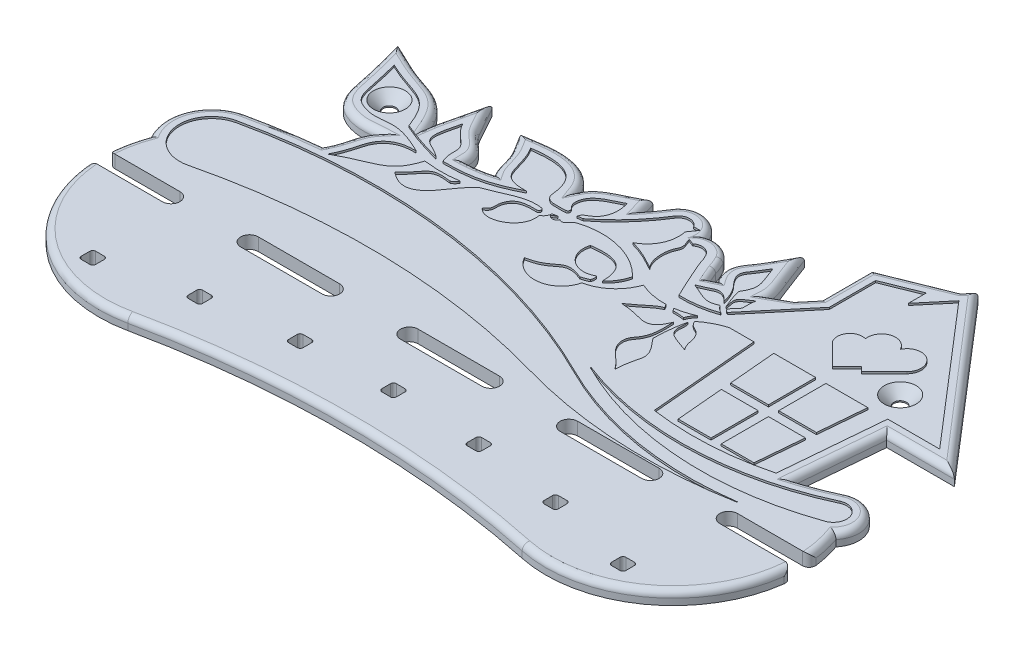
SolidWorks part; units mm, degrees
ref_plane "Спереди" through (0, 0, 0) normal (0, 0, 1) x (1, 0, 0)
ref_plane "Сверху" through (0, 0, 0) normal (0, 1, 0) x (1, 0, 0)
ref_plane "Справа" through (0, 0, 0) normal (1, 0, 0) x (0, 0, -1)
sketch "Эскиз1" plane through (0, 0, 0) normal (0, 1, 0) x (1, 0, 0)
  line L0 (24.9197, 376.2178) -> (1038.9197, 376.2178) construction
  line L1 (-110, -110) -> (110, -110)
  line L2 (-110, -110) -> (-110, 110)
  line L3 (-110, 110) -> (110, 110)
  line L4 (110, -110) -> (110, 110)
  line L5 (-110, -110) -> (110, 110) construction
  line L6 (-110, 110) -> (110, -110) construction
  point P0 (0, 0)
  dimension "D1" = 220
  dimension "D2" = 220
sketch "Эскиз3" plane through (0, 0, 0) normal (0, 1, 0) x (1, 0, 0)
  line L0 (64.2625, 103.9701) -> (64.2625, 60.9701) construction
  line L1 (28.1812, 60.9701) -> (43.3986, 60.9701)
  line L2 (28.1812, 60.9701) -> (45.8403, 82.0154)
  line L3 (64.2625, 103.9701) -> (101.2787, 60.9701)
  line L4 (64.2235, 110.1465) -> (110, 56.9701)
  line L5 (19.6032, 56.9701) -> (39.7333, 56.9701)
  line L6 (19.6032, 56.9701) -> (41.8403, 83.4712)
  line L7 (64.2625, 60.9701) -> (64.2625, 20.5584) construction
  line L8 (62.7625, 60.9701) -> (62.7625, 45.9701)
  line L9 (65.7625, 60.9701) -> (65.7625, 45.9701)
  line L10 (50.7338, 45.9701) -> (62.7625, 45.9701)
  line L11 (50.9963, 42.9701) -> (62.7625, 42.9701)
  line L12 (79.1035, 60.9701) -> (77.7912, 45.9701)
  line L13 (85.1264, 60.9701) -> (82.1276, 26.6936)
  line L14 (52.3086, 27.9701) -> (62.7625, 27.9701)
  line L16 (43.3986, 60.9701) -> (46.5703, 24.7173)
  line L18 (88.7918, 56.9701) -> (86.4291, 29.9651)
  line L19 (19.6032, 56.9701) -> (110, 56.9701) construction
  line L20 (88.7918, 56.9701) -> (110, 56.9701)
  line L21 (62.7625, 60.9701) -> (62.7625, 20.5584) construction
  line L22 (65.7625, 27.9701) -> (76.2164, 27.9701)
  line L23 (65.7625, 60.9701) -> (65.7625, 20.5584) construction
  line L26 (49.4215, 60.9701) -> (62.7625, 60.9701)
  line L27 (28.1812, 60.9701) -> (101.2787, 60.9701) construction
  line L28 (65.7625, 60.9701) -> (79.1035, 60.9701)
  line L29 (85.1264, 60.9701) -> (101.2787, 60.9701)
  line L30 (65.7625, 45.9701) -> (77.7912, 45.9701)
  line L31 (62.7625, 42.9701) -> (62.7625, 27.9701)
  line L32 (65.7625, 42.9701) -> (65.7625, 27.9701)
  line L33 (65.7625, 42.9701) -> (77.5287, 42.9701)
  line L34 (77.5287, 42.9701) -> (76.2164, 27.9701)
  line L35 (39.7333, 56.9701) -> (42.4993, 25.3542)
  line L36 (89.1112, 60.6215) -> (85.1719, 15.5954) construction
  line L37 (39.4138, 60.6215) -> (43.3531, 15.5954) construction
  line L38 (43.3986, 60.9701) -> (85.1264, 60.9701) construction
  line L39 (110, -110) -> (110, 110) construction
  line L40 (45.8403, 82.0154) -> (45.8403, 96.5106)
  line L41 (45.8403, 96.5106) -> (56.9524, 100.9853)
  line L42 (56.9524, 100.9853) -> (56.9524, 95.2583)
  line L43 (56.9524, 95.2583) -> (64.2625, 103.9701)
  line L44 (28.1812, 60.9701) -> (64.2625, 103.9701) construction
  line L45 (41.8403, 83.4712) -> (41.8403, 99.212)
  line L46 (41.8403, 99.212) -> (61.7889, 107.245)
  line L48 (41.8403, 82.0154) -> (41.8403, 99.212) construction
  line L49 (61.7889, 107.245) -> (64.2235, 110.1465)
  line L50 (19.6032, 56.9701) -> (64.2235, 110.1465) construction
  line L51 (41.8403, 99.212) -> (60.9524, 106.9082) construction
  line L52 (60.9524, 106.9082) -> (60.9524, 95.2583) construction
  line L53 (68.2625, 77.8382) -> (68.2625, 69.5358) construction
  line L54 (68.2625, 69.5358) -> (75.4445, 76.7177)
  line L55 (64.2625, 79.8997) -> (72.2625, 79.8997) construction
  line L56 (68.2625, 69.5358) -> (66.9162, 70.8821)
  line L57 (58.805, 75.4277) -> (62.305, 75.4277) construction
  line L58 (62.305, 75.4277) -> (62.305, 66.2709) construction
  line L59 (62.305, 66.2709) -> (55.9766, 72.5993)
  line L60 (62.305, 66.2709) -> (66.9162, 70.8821)
  line L61 (50.9963, 42.9701) -> (52.3086, 27.9701)
  line L62 (49.4215, 60.9701) -> (50.7338, 45.9701)
  line L63 (-110, 7.8444) -> (110, 7.8444) construction
  line L64 (85.1264, 60.9701) -> (81.5066, 19.5954) construction
  line L65 (81.5066, 19.5954) -> (47.0184, 19.5954) construction
  line L66 (43.3986, 60.9701) -> (47.0184, 19.5954) construction
  line L67 (-110, -110) -> (-110, 110) construction
  line L68 (85.1719, 15.5954) -> (43.3531, 15.5954) construction
  line L69 (-99.8714, 39.0204) -> (-91.3859, 20.9097) construction
  arc A0 (68.2625, 81.9613) -> (59.8025, 79.3014) centre (64.2625, 79.8997) ccw
  arc A1 (75.4445, 76.7177) -> (68.2625, 81.9613) centre (72.2625, 79.8997) ccw
  arc A2 (59.8025, 79.3014) -> (55.9766, 72.5993) centre (58.805, 75.4277) ccw
  arc A3 (103.0783, 23.5305) -> (100.051, 30.9259) centre (101.74, 27.3) ccw
  arc A5 (26.6865, 27.4925) -> (100.051, 30.9259) centre (59.1823, 118.6654) ccw
  arc A6 (26.6865, 27.4925) -> (103.0783, 23.5305) centre (69.6614, 117.6558) ccw
  arc A7 (23.1374, 24.7751) -> (83.617, 14.7163) centre (69.6614, 117.6558) ccw
  arc A8 (104.4165, 19.761) -> (98.3621, 34.5519) centre (101.74, 27.3) ccw
  arc A9 (86.4291, 29.9651) -> (98.3621, 34.5519) centre (59.1823, 118.6654) ccw
  arc A10 (28.0294, 31.2604) -> (98.3621, 34.5519) centre (59.1823, 118.6654) ccw construction
  arc A11 (46.5703, 24.7173) -> (82.1276, 26.6936) centre (59.1823, 118.6654) ccw
  arc A12 (27.358, 29.3764) -> (99.2066, 32.7389) centre (59.1823, 118.6654) ccw construction
  arc A13 (24.9654, 23.8817) -> (104.4165, 19.761) centre (69.6614, 117.6558) ccw construction
  arc A14 (23.1374, 24.7751) -> (-97.7946, 39.7277) centre (-58.3735, -137.9539) ccw
  arc A15 (83.617, 14.7163) -> (16.2895, 18.0521) centre (57.1618, 161.8764) cw
  arc A16 (16.2895, 18.0521) -> (-93.282, 20.2443) centre (-42.669, -189.4148) ccw
  arc A17 (-97.7946, 39.7277) -> (-93.282, 20.2443) centre (-95.6286, 29.9651) ccw
  arc A19 (24.9288, 28.3515) -> (-98.661, 43.6327) centre (-58.3735, -137.9539) ccw
  arc A20 (-98.661, 43.6327) -> (-92.3433, 16.356) centre (-95.6286, 29.9651) ccw
  arc A21 (15.1961, 14.2044) -> (-92.3433, 16.356) centre (-42.669, -189.4148) ccw
  point P4 (64.2625, 60.9701)
  dimension "D12" = 9
  dimension "D15" = 8
  dimension "D20" = 8
  dimension "D23" = 20
  dimension "D1" = 40
  dimension "D2" = 43
  dimension "D6" = 3
  dimension "D7" = 5
  dimension "D8" = 15
  dimension "D9" = 15
  dimension "D13" = 8
  dimension "D14" = 45
  dimension "D16" = 3.5
  dimension "D17" = 45
  dimension "D18" = 6
  dimension "D3" = 4
  dimension "D4" = 1.5
  dimension "D5" = 1.5
  dimension "D10" = 4
  dimension "D11" = 4
  dimension "D19" = 4
  dimension "D21" = 4
  dimension "D22" = 2
  dimension "D24" = 4
sketch "Эскиз4" plane through (0, 0, 0) normal (0, 1, 0) x (1, 0, 0)
  line L0 (-70, 8.9797) -> (70, 8.9797) construction
  line L1 (-66.276, 48.806) -> (66.4656, 48.8233)
  line L3 (0, 0) -> (0, 8.9797) construction
  arc A0 (-66.276, 48.806) -> (-61.7647, -30.1633) centre (-70, 8.9797) ccw
  arc A1 (-98.9066, 22.9467) -> (18.8733, 19.0244) centre (-47.3155, -198.186) cw construction
  arc A2 (17.3829, 21.8997) -> (-94.2206, 24.1326) centre (-42.669, -189.4148) ccw
  arc A3 (20.3824, 21.0242) -> (-98.9066, 22.9467) centre (-42.669, -189.4148) ccw construction
  arc A4 (61.7647, -30.1633) -> (66.4656, 48.8233) centre (70, 8.9797) ccw
  arc A5 (-61.7647, -30.1633) -> (61.7647, -30.1633) centre (0, -323.7364) cw
  point P10 (1.414, 12.964)
  dimension "D3" = 40
  dimension "D4" = 40
  dimension "D5" = 300
  dimension "D2" = 140
  dimension "D1" = 4
sketch "Эскиз5" plane through (0, 0, 0) normal (0, 1, 0) x (1, 0, 0)
  line L0 (19.4678, 57.3611) -> (20.1869, 56.1334)
  line L1 (21.4931, 57.5238) -> (22.1246, 56.5168)
  line L2 (7.1547, 77.7869) -> (5.5048, 78.3997)
  line L3 (5.5048, 78.3997) -> (6.2156, 76.5198)
  line L4 (2.6024, 79.9565) -> (4.4345, 82.5645)
  line L5 (4.4345, 82.5645) -> (2.6024, 82.5645)
  line L6 (32.6801, 75.9406) -> (38.6301, 79.2463)
  line L7 (-77.7166, 47.1129) -> (-78.2226, 46.1222)
  arc A0 (27.6672, 56.3188) -> (26.4504, 45.966) centre (67.0603, 46.4409) ccw
  arc A1 (28.3849, 57.1795) -> (38.4245, 61.6181) centre (41.6095, 40.8401) cw
  arc A2 (25.8064, 56.3188) -> (29.1303, 60.128) centre (31.504, 54.7019) cw
  arc A3 (29.1303, 60.128) -> (21.4931, 57.5238) centre (18.8463, 77.7869) cw
  arc A4 (19.4678, 57.3611) -> (10.5596, 59.1073) centre (18.8463, 77.7869) cw
  arc A5 (4.8332, 65.6803) -> (7.1547, 64.4869) centre (19.9633, 92.2585) ccw
  arc A6 (30.5687, 63.5732) -> (28.1974, 65.5826) centre (32.4248, 68.1674) cw
  arc A7 (30.1155, 65.2643) -> (31.2408, 64.6261) centre (31.5857, 66.5456) ccw
  arc A8 (27.1889, 72.2037) -> (29.4866, 65.6803) centre (55.1893, 78.3997) ccw
  arc A9 (27.822, 66.762) -> (25.2436, 72.6741) centre (14.8033, 64.6025) ccw
  arc A10 (18.8463, 61.6959) -> (13.422, 73.6764) centre (232.08, 165.4576) cw
  arc A11 (7.1547, 77.7869) -> (12.1628, 76.8463) centre (9.266, 75.2251) cw
  arc A12 (12.1628, 76.8463) -> (13.422, 73.6764) centre (0.8643, 70.5231) cw
  arc A13 (18.8463, 61.6959) -> (30.5687, 63.5732) centre (19.9633, 92.2585) ccw
  arc A14 (4.8332, 65.6803) -> (-2.8095, 68.8088) centre (-11.0495, 37.7801) ccw
  arc A15 (-16.7249, 65.4567) -> (6.7404, 59.5803) centre (-9.7268, 43.6133) cw
  arc A16 (-2.8095, 68.8088) -> (2.6024, 79.9565) centre (-7.0292, 77.7449) ccw
  arc A17 (2.6024, 82.5645) -> (-3.1371, 82.5593) centre (-0.2657, 80.7486) ccw
  arc A18 (-3.1371, 82.5593) -> (-16.794, 67.4541) centre (-53.321, 114.2051) cw
  arc A19 (-22.757, 63.3551) -> (-20.2996, 63.7937) centre (-21.6147, 64.0583) ccw
  arc A20 (-20.2996, 63.7937) -> (-18.6001, 63.7937) centre (-19.4499, 64.6435) ccw
  arc A21 (-16.7249, 65.4567) -> (-18.6001, 63.7937) centre (-14.7474, 61.3381) ccw
  arc A22 (-23.1659, 64.0583) -> (-21.0561, 64.417) centre (-15.623, 26.0783) cw
  arc A23 (-25.7505, 66.9301) -> (-21.8358, 66.9301) centre (-23.7932, 110.2778) ccw
  arc A24 (-21.0561, 64.417) -> (-22.757, 63.3551) centre (-53.321, 114.2051) cw
  arc A25 (0.2898, 50.01) -> (10.5596, 59.1073) centre (-2.3445, 63.3292) ccw
  arc A26 (6.7404, 59.5803) -> (2.9913, 53.4771) centre (-4.13, 62.0547) cw
  arc A27 (6.9888, 82.1815) -> (15.6533, 78.7998) centre (9.266, 75.2251) cw
  arc A28 (15.6533, 78.7998) -> (17.2194, 74.9649) centre (0.8643, 70.5231) cw
  arc A29 (18.7732, 71.3609) -> (17.2194, 74.9649) centre (232.08, 165.4576) cw
  arc A30 (22.4431, 63.4461) -> (17.2194, 74.9649) centre (232.08, 165.4576) cw construction
  arc A31 (-18.6001, 67.1978) -> (-16.794, 67.4541) centre (-23.7932, 110.2778) ccw
  arc A32 (6.9888, 82.1815) -> (-6.5206, 84.6929) centre (-0.2657, 80.7486) ccw
  arc A33 (-6.5206, 84.6929) -> (-10.2784, 79.4404) centre (-53.321, 114.2051) cw
  arc A34 (-6.5206, 84.6929) -> (-19.2567, 70.6061) centre (-53.321, 114.2051) cw construction
  arc A35 (5.982, 84.7042) -> (-6.5206, 84.6929) centre (-0.2657, 80.7486) ccw construction
  arc A36 (4.6108, 80.8737) -> (15.6533, 78.7998) centre (9.266, 75.2251) cw construction
  arc A37 (-15.327, 47.7127) -> (0.2898, 50.01) centre (-7.9678, 51.9148) ccw
  arc A38 (-8.3753, 61.3381) -> (0.8643, 54.2489) centre (-2.4156, 59.5399) ccw
  arc A39 (0.8643, 54.2489) -> (0.8643, 52.0875) centre (-1.2063, 53.1682) cw
  arc A40 (0.8643, 52.0875) -> (-1.6675, 51.1816) centre (-4.13, 62.0547) cw
  arc A41 (-25.7505, 66.9301) -> (-28.3732, 68.8088) centre (-25.6673, 69.8162) cw
  arc A42 (-26.3597, 64.0583) -> (-26.581, 62.5386) centre (-26.4704, 63.2985) cw
  arc A43 (-23.1659, 64.0583) -> (-24.7346, 61.6181) centre (-25.7573, 63.9998) cw
  arc A44 (-47.9015, 56.7778) -> (-46.1807, 58.622) centre (-49.077, 59.5994) ccw
  arc A45 (-56.2461, 61.045) -> (-69.4638, 65.4567) centre (-37.2613, 139.9298) cw
  spline S0 degree 3 poles (28.864, 31.9915) (29.1088, 36.1758) (30.1262, 38.2083) (30.1196, 41.0626) (29.3386, 42.6134) (26.4504, 45.966) knots 0 0 0 0 0.448203 0.548203 1 1 1 1
  spline S1 degree 3 poles (25.4671, 54.2489) (25.5173, 50.6569) (25.6797, 49.6888) (25.1124, 46.3323) (24.3246, 44.441) (22.0407, 41.7038) (22.9149, 36.5797) (26.4478, 35.1323) (28.864, 31.9915) knots 0 0 0 0 0.262515 0.304969 0.411252 0.445475 0.633918 1 1 1 1
  spline S2 degree 3 poles (27.6672, 56.3188) (28.3045, 53.9957) (27.2385, 53.4399) (28.6078, 50.1196) (30.5333, 49.3866) (34.3409, 48.063) knots 0 0 0 0 0.587102 0.687102 1 1 1 1
  spline S3 degree 3 poles (28.3849, 57.1795) (29.1923, 54.9931) (30.8853, 55.4261) (33.5762, 51.8287) (32.9236, 50.2449) (34.3409, 48.063) knots 0 0 0 0 0.398325 0.498325 1 1 1 1
  spline S4 degree 2 poles (25.4671, 54.2489) (25.6465, 53.3545) (25.4982, 52.6234) knots 0 0 0 0.045717 0.045717 0.045717
  spline S5 degree 3 poles (12.4577, 50.651) (17.1173, 50.4382) (20.581, 48.0281) (24.2467, 50.5319) (25.4671, 54.2489) knots 0 0 0 0 0.57212 1 1 1 1
  spline S6 degree 2 poles (25.8064, 56.3188) (23.6043, 56.6296) (22.1246, 56.5168) knots 0 0 0 0.2017 0.2017 0.2017
  spline S7 degree 3 poles (20.1869, 56.1334) (19.9461, 56.0505) (19.4858, 55.8613) (17.3232, 54.6994) (15.6338, 52.8537) (12.4577, 50.651) knots 0.353395 0.353395 0.353395 0.353395 0.417809 0.482469 1 1 1 1
  spline S8 degree 3 poles (30.1155, 65.2643) (30.7673, 67.1396) (32.8462, 67.7574) (32.0339, 69.5856) (32.4248, 72.0657) knots 0 0 0 0 0.440299 1 1 1 1
  spline S9 degree 3 poles (29.4866, 65.6803) (29.5495, 66.918) (28.7194, 68.5444) (29.6678, 70.4068) (30.3583, 70.6308) (32.4248, 72.0657) knots 0 0 0 0 0.392131 0.492131 1 1 1 1
  spline S10 degree 3 poles (27.1889, 72.2037) (28.6875, 74.7307) (28.9636, 77.5082) (27.6486, 80.2711) (26.4504, 83.4163) knots 0 0 0 0 0.437978 1 1 1 1
  spline S11 degree 3 poles (26.4504, 83.4163) (24.5288, 79.9961) (21.0811, 77.0285) (24.2801, 73.6675) (25.2436, 72.6741) knots 0 0 0 0 0.439909 1 1 1 1
  spline S12 degree 3 poles (27.822, 66.762) (26.36, 68.5846) (23.5856, 69.9175) (21.8685, 68.2115) (18.8463, 67.0583) knots 0 0 0 0 0.435142 1 1 1 1
  spline S13 degree 3 poles (28.1974, 65.5826) (24.1965, 63.8319) (23.3678, 65.3547) (18.8463, 67.0583) knots 0 0 0 0 1 1 1 1
  spline S14 degree 3 poles (6.2156, 76.5198) (6.613, 75.2328) (4.5903, 72.3616) (4.9375, 66.7491) (7.1547, 64.4869) knots 0 0 0 0 0.212545 1 1 1 1
  spline S15 degree 1 poles (30.6294, 70.1633) (27.1473, 92.823) knots 0 0 1 1 construction
  spline S16 degree 1 poles (27.1473, 92.823) (22.3722, 69.8893) knots 0 0 1 1 construction
  spline S17 degree 3 poles (30.6294, 70.1633) (30.8052, 70.4597) (31.1548, 71.075) (31.7297, 72.2071) (32.2875, 73.5781) (32.6706, 75.2341) (32.7108, 76.5624) (32.6251, 77.4728) (32.505, 78.2509) (32.1997, 79.5706) (31.5924, 81.2775) (30.8431, 83.1384) (30.1036, 85.0597) (29.3057, 87.1591) (28.3284, 89.7219) (27.5405, 91.7909) (27.1473, 92.823) knots 0 0 0 0 0.046109 0.092218 0.184435 0.276653 0.36887 0.414979 0.461088 0.553306 0.737741 0.922176 1.014394 1.106611 1.291046 1.475482 1.475482 1.475482 1.475482 only from (32.6801, 75.9406) to (27.1473, 92.823)
  spline S18 degree 3 poles (27.1473, 92.823) (26.7871, 92.1819) (26.0669, 90.9) (24.9858, 88.9758) (24.0869, 87.376) (23.4538, 86.2489) (23.1425, 85.6952) (22.9562, 85.363) (22.7285, 84.9613) (22.3766, 84.37) (21.7954, 83.456) (21.1153, 82.4708) (20.3532, 81.3997) (19.7074, 80.4026) (19.2117, 79.3629) (18.8991, 78.4226) (18.7333, 77.3369) (18.7597, 75.9937) (19.1132, 74.5438) (19.7571, 73.1771) (20.4753, 72.0694) (21.1967, 71.1574) (21.748, 70.5432) (22.1379, 70.1313) (22.2903, 69.9737) (22.3722, 69.8893) knots -0.319292 -0.319292 -0.319292 -0.319292 -0.236836 -0.154381 -0.071925 -0.030697 -0.010083 0.000224 0.010531 0.051759 0.092987 0.175442 0.257898 0.340354 0.381582 0.42281 0.464038 0.505265 0.587721 0.670177 0.752633 0.835088 0.917544 0.958772 1 1 1 1 only from (27.1473, 92.823) to (20.4307, 72.1657)
  spline S19 degree 1 poles (30.9423, 69.2647) (17.4203, 70.7955) knots 0 0 1 1 construction
  spline S20 degree 3 poles (30.9423, 69.2647) (30.6812, 69.5902) (30.1248, 70.2352) (28.9969, 71.3332) (27.4391, 72.4464) (25.2385, 73.2112) (23.3591, 73.186) (22.0829, 72.8677) (21.042, 72.475) (20.2646, 72.0842) (19.512, 71.7093) (18.9122, 71.421) (18.3457, 71.1684) (17.8415, 70.9594) (17.5587, 70.8483) (17.4203, 70.7955) knots 0 0 0 0 0.0625 0.125 0.25 0.375 0.5 0.5625 0.625 0.75 0.8125 0.875 0.9375 0.96875 1 1 1 1 only from (20.4307, 72.1657) to (18.7732, 71.3609)
  spline S21 degree 3 poles (-18.6001, 67.1978) (-18.2274, 69.3391) (-15.8629, 68.7074) (-13.2684, 74.0361) (-13.6602, 76.7101) (-14.141, 78.3997) knots 0 0 0 0 0.560438 0.660438 1 1 1 1
  spline S22 degree 3 poles (-14.141, 78.3997) (-17.4129, 76.7273) (-21.8781, 75.2141) (-22.7538, 69.3543) (-20.55, 68.3378) (-21.1817, 67.0782) (-21.8358, 66.9301) knots 0 0 0 0 0.452436 0.534421 0.788133 1 1 1 1
  spline S23 degree 1 poles (-14.8622, 65.7737) (-11.6263, 84.1774) knots 0 0 1 1 construction
  spline S24 degree 1 poles (-11.6263, 84.1774) (-25.7505, 67.7514) knots 0 0 1 1 construction
  spline S25 degree 3 poles (-14.8622, 65.7737) (-14.7576, 65.8356) (-14.567, 65.9489) (-14.0459, 66.2751) (-13.2758, 66.8236) (-12.2735, 67.7642) (-11.3374, 68.9898) (-10.5598, 70.4077) (-9.9439, 72.1081) (-9.6531, 73.7974) (-9.6017, 75.3881) (-9.7229, 76.8692) (-9.9242, 78.0115) (-10.1169, 78.8475) (-10.2891, 79.4845) (-10.4169, 79.9254) (-10.598, 80.5645) (-10.8207, 81.3458) (-11.179, 82.6057) (-11.4473, 83.5484) (-11.6263, 84.1774) knots 0.302463 0.302463 0.302463 0.302463 0.334065 0.365666 0.428869 0.492072 0.555275 0.618478 0.681681 0.744884 0.808086 0.871289 0.934492 0.966094 0.997695 1.029297 1.060898 1.124101 1.187304 1.31371 1.31371 1.31371 1.31371 only from (-10.2784, 79.4404) to (-11.6263, 84.1774)
  spline S26 degree 3 poles (-11.6263, 84.1774) (-12.3638, 83.8004) (-13.4737, 83.2326) (-14.9387, 82.4851) (-15.8852, 81.9977) (-16.5426, 81.6696) (-17.2635, 81.3209) (-18.5921, 80.69) (-20.6525, 79.6665) (-22.7856, 78.261) (-24.3903, 76.6407) (-25.4392, 75.1292) (-26.1879, 73.2584) (-26.4487, 71.7488) (-26.4743, 70.4534) (-26.3586, 69.4701) (-26.1074, 68.5418) (-25.8827, 68.0142) (-25.7505, 67.7514) knots -0.199828 -0.199828 -0.199828 -0.199828 -0.097852 -0.046863 0.004125 0.029619 0.055113 0.106101 0.208077 0.310053 0.361041 0.412029 0.463017 0.514005 0.539499 0.564993 0.590487 0.615981 0.615981 0.615981 0.615981 only from (-11.6263, 84.1774) to (-25.5338, 74.788)
  spline S27 degree 3 poles (-15.327, 47.7127) (-7.0902, 49.258) (-9.1779, 54.2284) (-1.6675, 51.1816) knots 0 0 0 0 1 1 1 1
  spline S28 degree 3 poles (2.9913, 53.4771) (2.9279, 59.9836) (0.1931, 62.5241) (-8.3753, 61.3381) knots 0 0 0 0 1 1 1 1
  spline S29 degree 3 poles (-44.0346, 78.3997) (-31.4187, 80.2501) (-28.9075, 75.4359) (-28.3732, 68.8088) knots 0 0 0 0 1 1 1 1
  spline S30 degree 3 poles (-44.0346, 78.3997) (-39.6734, 71.372) (-43.0205, 65.6475) (-32.8408, 66.2981) knots 0 0 0 0 1 1 1 1
  spline S31 degree 3 poles (-32.8408, 66.2981) (-40.4611, 62.364) (-45.409, 60.972) (-54.4339, 61.045) knots 0 0 0 0 1 1 1 1
  spline S32 degree 3 poles (-57.3626, 58.4909) (-52.8684, 57.9059) (-49.2421, 58.0726) (-46.1807, 58.622) knots 0 0 0 0 0.256014 0.256014 0.256014 0.256014
  spline S33 degree 1 poles (-43.3924, 66.2308) (-54.4016, 65.0449) knots 0 0 1 1 construction
  spline S34 degree 1 poles (-50.6491, 81.4724) (-43.3924, 66.2308) knots 0 0 1 1 construction
  spline S35 degree 1 poles (-50.6491, 81.4724) (-24.3861, 69.1303) knots 0 0 1 1 construction
  spline S36 degree 3 poles (-54.4016, 65.0449) (-53.8419, 65.0403) (-52.6941, 65.0435) (-50.6251, 65.1026) (-48.2695, 65.2759) (-45.7476, 65.649) (-44.1784, 66.0135) (-43.3924, 66.2308) knots 0.460482 0.460482 0.460482 0.460482 0.527922 0.595362 0.730241 0.865121 1 1 1 1 only from (-51.3001, 65.0886) to (-43.3924, 66.2308)
  spline S37 degree 3 poles (-43.3924, 66.2308) (-43.6194, 66.567) (-44.0387, 67.2933) (-44.6298, 68.6455) (-45.1235, 70.2283) (-45.5964, 71.9677) (-46.0317, 73.3498) (-46.4623, 74.4393) (-46.7799, 75.1234) (-47.0671, 75.6691) (-47.2716, 76.0264) (-47.4285, 76.2834) (-47.6705, 76.6722) (-48.0543, 77.2913) (-48.6232, 78.2078) (-49.5219, 79.6561) (-50.1986, 80.7464) (-50.6491, 81.4724) knots -0.245781 -0.245781 -0.245781 -0.245781 -0.19413 -0.14248 -0.039179 0.064122 0.167422 0.219073 0.270723 0.296548 0.322373 0.335286 0.348199 0.374024 0.425674 0.477324 0.580625 0.580625 0.580625 0.580625
  spline S38 degree 3 poles (-50.6491, 81.4724) (-49.7349, 81.6064) (-48.3637, 81.8074) (-46.5349, 82.076) (-45.3932, 82.2425) (-44.4769, 82.3789) (-43.4816, 82.5151) (-41.8444, 82.6981) (-39.6351, 82.83) (-37.2097, 82.7702) (-34.2241, 82.3895) (-30.8973, 81.2994) (-27.7096, 78.8487) (-25.7303, 75.6812) (-24.7468, 72.3852) (-24.4744, 70.2254) (-24.3861, 69.1303) knots -0.159428 -0.159428 -0.159428 -0.159428 -0.086964 -0.050731 -0.014499 0.003617 0.021733 0.057965 0.130429 0.202893 0.275358 0.420286 0.565215 0.710143 0.855072 1 1 1 1 only from (-50.6491, 81.4724) to (-25.5338, 74.788)
  spline S39 degree 3 poles (-35.4507, 54.7019) (-32.458, 50.8459) (-23.2533, 55.0728) (-24.7346, 61.6181) knots 0 0 0 0 1 1 1 1
  spline S40 degree 3 poles (-26.581, 62.5386) (-29.4845, 62.616) (-32.196, 62.3195) (-34.8092, 57.5268) (-33.1149, 56.1296) (-35.4507, 54.7019) knots 0 0 0 0 0.380693 0.480693 1 1 1 1
  spline S41 degree 3 poles (-58.8182, 50.651) (-55.9302, 53.2618) (-54.3551, 57.1374) (-50.7365, 57.1618) (-47.9015, 56.7778) knots 0 0 0 0 0.597042 1 1 1 1
  spline S42 degree 3 poles (-58.8182, 50.651) (-52.8866, 45.927) (-47.8378, 51.4987) (-43.6472, 58.0811) (-41.6311, 59.8012) knots 0 0 0 0 0.68526 1 1 1 1
  spline S43 degree 3 poles (-41.6311, 59.8012) (-35.6429, 61.825) (-31.8828, 64.8627) (-26.3597, 64.0583) knots 0.395484 0.395484 0.395484 0.395484 1 1 1 1
  spline S44 degree 3 poles (-61.4061, 74.1485) (-59.3121, 70.3906) (-53.9826, 68.5912) (-55.7567, 63.7995) (-54.4339, 61.045) knots 0 0 0 0 0.593908 1 1 1 1
  spline S45 degree 3 poles (-61.4061, 74.1485) (-62.4592, 69.6187) (-64.3272, 64.1557) (-58.1897, 62.8667) (-56.2461, 61.045) knots 0 0 0 0 0.586984 1 1 1 1
  spline S46 degree 3 poles (-69.4638, 65.4567) (-73.7379, 76.9363) (-77.325, 74.388) (-87.9656, 79.4404) knots 0 0 0 0 1 1 1 1
  spline S47 degree 3 poles (-87.9656, 79.4404) (-85.4912, 69.9878) (-85.8568, 65.5282) (-77.3942, 61.8858) (-71.6532, 64.8855) (-63.0226, 60.755) (-60.8673, 59.5994) knots 0 0 0 0 0.258742 0.329402 0.664695 1 1 1 1
  spline S48 degree 3 poles (-57.3626, 58.4909) (-60.0804, 49.2999) (-64.4518, 50.7723) (-74.1544, 45.2932) knots 0 0 0 0 1 1 1 1
  spline S49 degree 3 poles (-60.8673, 59.5994) (-66.849, 60.0678) (-71.9927, 54.9872) (-71.8443, 49.8157) (-74.1544, 45.2932) knots 0 0 0 0 0.525603 1 1 1 1
  spline S50 degree 1 poles (-62.9558, 85.1473) (-58.9815, 58.1265) knots 0 0 1 1 construction
  spline S51 degree 1 poles (-62.9558, 85.1473) (-50.8281, 62.7766) knots 0 0 1 1 construction
  spline S52 degree 3 poles (-58.9815, 58.1265) (-59.0911, 58.2293) (-59.312, 58.4148) (-59.867, 58.8032) (-60.7444, 59.29) (-61.8545, 59.8284) (-62.8795, 60.3874) (-63.719, 60.9246) (-64.6315, 61.6682) (-65.797, 63.0425) (-66.6141, 65.0109) (-66.8088, 67.1804) (-66.635, 69.1115) (-66.2835, 70.9604) (-65.8387, 72.8301) (-65.3708, 74.7404) (-64.727, 77.5393) (-63.9218, 80.988) (-63.2778, 83.7622) (-62.9558, 85.1473) knots -0.435964 -0.435964 -0.435964 -0.435964 -0.39109 -0.346216 -0.256469 -0.166721 -0.121847 -0.076973 -0.032099 0.012775 0.102522 0.19227 0.282018 0.371766 0.461513 0.551261 0.641009 0.820504 1 1 1 1 only from (-66.6073, 69.0836) to (-62.9558, 85.1473)
  spline S53 degree 3 poles (-62.9558, 85.1473) (-62.3049, 83.9792) (-61.3286, 82.2271) (-60.1895, 80.1829) (-59.5387, 79.0149) (-59.0504, 78.1386) (-58.644, 77.4092) (-58.3178, 76.8238) (-58.1163, 76.4622) (-57.9704, 76.2005) (-57.8947, 76.0644) (-57.8186, 75.9307) (-57.6278, 75.6132) (-57.218, 75.0186) (-56.5628, 74.2548) (-55.6633, 73.4044) (-54.6326, 72.5131) (-53.6562, 71.6149) (-52.8309, 70.6503) (-52.23, 69.7572) (-51.71, 68.6439) (-51.4135, 67.4205) (-51.327, 66.4665) (-51.3011, 65.4384) (-51.2987, 64.5334) (-51.2072, 63.8501) (-51.0514, 63.2915) (-50.9057, 62.9381) (-50.8281, 62.7766) knots -0.476854 -0.476854 -0.476854 -0.476854 -0.292247 -0.199944 -0.153792 -0.107641 -0.061489 -0.038413 -0.015337 -0.003799 0.00197 0.007739 0.030814 0.076966 0.16927 0.261573 0.353876 0.44618 0.492331 0.538483 0.584635 0.630786 0.676938 0.72309 0.815393 0.907697 0.953848 1 1 1 1 only from (-62.9558, 85.1473) to (-51.3001, 65.0886)
  spline S54 degree 1 poles (-65.7151, 66.8525) (-94.0108, 86.7388) knots 0 0 1 1 construction
  spline S55 degree 1 poles (-94.0108, 86.7388) (-72.6438, 59.2183) knots 0 0 1 1 construction
  spline S56 degree 1 poles (-72.6438, 59.2183) (-77.7166, 47.1129) knots 0 0 1 1 construction
  spline S57 degree 3 poles (-65.7151, 66.8525) (-65.888, 67.3166) (-66.2544, 68.2614) (-66.9771, 69.9591) (-67.922, 71.8691) (-69.1593, 73.8447) (-70.5517, 75.5439) (-72.1038, 76.952) (-74.3124, 78.4243) (-77.0975, 79.5983) (-79.8706, 80.5025) (-82.3117, 81.3732) (-83.9691, 82.0288) (-85.229, 82.58) (-85.9661, 82.9185) (-86.7679, 83.3) (-87.8134, 83.796) (-90.2869, 84.9707) (-92.3574, 85.9537) (-94.0108, 86.7388) knots 0 0 0 0 0.038848 0.077695 0.15539 0.233086 0.310781 0.388476 0.466171 0.621562 0.776952 0.854647 0.932342 0.97119 0.990614 1.010038 1.048885 1.087733 1.243123 1.243123 1.243123 1.243123 only from (-66.6073, 69.0836) to (-94.0108, 86.7388)
  spline S58 degree 3 poles (-94.0108, 86.7388) (-93.6098, 85.2068) (-93.0071, 82.9048) (-92.3081, 80.2331) (-91.9027, 78.6866) (-91.3279, 76.4774) (-90.6672, 73.6179) (-90.0233, 70.5129) (-89.4695, 67.9406) (-88.8123, 65.6271) (-87.8561, 63.6753) (-86.6667, 62.2456) (-85.2235, 61.0223) (-83.3674, 60.0747) (-81.377, 59.4024) (-79.489, 59.0114) (-77.1519, 58.8241) (-75.1883, 58.9777) (-73.8235, 59.1244) (-73.1219, 59.188) (-72.8063, 59.2098) (-72.6438, 59.2183) knots -0.075834 -0.075834 -0.075834 -0.075834 -0.0339 -0.012933 -0.002449 0.008035 0.049969 0.091904 0.133838 0.175772 0.217707 0.238674 0.259641 0.301576 0.34351 0.385445 0.427379 0.511248 0.553183 0.57415 0.595117 0.595117 0.595117 0.595117
  spline S59 degree 3 poles (-72.6438, 59.2183) (-72.8636, 58.955) (-73.2864, 58.4001) (-73.9918, 57.2965) (-74.6697, 55.9103) (-75.2063, 54.3579) (-75.5842, 52.9665) (-75.9235, 51.6743) (-76.3184, 50.3631) (-76.7755, 49.1365) (-77.2572, 48.041) (-77.5634, 47.4128) (-77.7166, 47.1129) knots 0.395215 0.395215 0.395215 0.395215 0.433014 0.470813 0.546412 0.62201 0.697608 0.773206 0.848804 0.924402 0.962201 1 1 1 1
  dimension "D1" = 4
  dimension "D2" = 4
  dimension "D3" = 4
  dimension "D4" = 4
  dimension "D5" = 4
  dimension "D6" = 4
  dimension "D7" = 4
  dimension "D8" = 4
sketch "Эскиз6" plane through (0, 0, 0) normal (0, 1, 0) x (1, 0, 0)
  line L0 (-77.7166, 47.1129) -> (-77.7561, 47.0355)
  line L2 (66.4656, 48.8233) -> (-66.276, 48.806)
  line L5 (32.6801, 75.9406) -> (38.6301, 79.2463)
  line L6 (32.6801, 75.9406) -> (38.0027, 78.8978)
  line L40 (19.6032, 56.9701) -> (41.8403, 83.4712)
  line L41 (41.8403, 83.4712) -> (41.8403, 99.212)
  line L42 (41.8403, 99.212) -> (61.7889, 107.245)
  line L43 (61.7889, 107.245) -> (64.2235, 110.1465)
  line L44 (64.2235, 110.1465) -> (110, 56.9701)
  line L45 (110, 56.9701) -> (88.7918, 56.9701)
  line L46 (88.7918, 56.9701) -> (86.4291, 29.9651)
  line L47 (38.0027, 78.8978) -> (41.8403, 83.4712)
  line L48 (41.8403, 83.4712) -> (41.8403, 99.212)
  line L49 (41.8403, 99.212) -> (61.7889, 107.245)
  line L50 (61.7889, 107.245) -> (64.2235, 110.1465)
  line L51 (64.2235, 110.1465) -> (110, 56.9701)
  line L52 (110, 56.9701) -> (88.7918, 56.9701)
  line L53 (88.7918, 56.9701) -> (86.4291, 29.9651)
  arc A12 (61.7647, -30.1633) -> (66.4656, 48.8233) centre (70, 8.9797) ccw
  arc A13 (61.7647, -30.1633) -> (-61.7647, -30.1633) centre (0, -323.7364) ccw
  arc A14 (-66.276, 48.806) -> (-61.7647, -30.1633) centre (-70, 8.9797) ccw
  arc A15 (61.7647, -30.1633) -> (107.7963, 22.0731) centre (70, 8.9797) ccw
  arc A16 (61.7647, -30.1633) -> (-61.7647, -30.1633) centre (0, -323.7364) ccw
  arc A17 (-107.5818, 22.6767) -> (-61.7647, -30.1633) centre (-70, 8.9797) ccw
  arc A23 (24.9288, 28.3515) -> (-98.661, 43.6327) centre (-58.3735, -137.9539) ccw
  arc A24 (-98.661, 43.6327) -> (-92.3433, 16.356) centre (-95.6286, 29.9651) ccw
  arc A25 (-77.7561, 47.0355) -> (-98.661, 43.6327) centre (-58.3735, -137.9539) ccw
  arc A26 (-98.661, 43.6327) -> (-107.5818, 22.6767) centre (-95.6286, 29.9651) ccw
  arc A50 (17.2194, 74.9649) -> (18.7732, 71.3609) centre (232.08, 165.4576) ccw
  arc A51 (17.2194, 74.9649) -> (15.6533, 78.7998) centre (0.8643, 70.5231) ccw
  arc A52 (15.6533, 78.7998) -> (6.9888, 82.1815) centre (9.266, 75.2251) ccw
  arc A53 (6.9888, 82.1815) -> (-6.5206, 84.6929) centre (-0.2657, 80.7486) ccw
  arc A54 (-10.2784, 79.4404) -> (-6.5206, 84.6929) centre (-53.321, 114.2051) ccw
  arc A55 (17.2194, 74.9649) -> (18.7732, 71.3609) centre (232.08, 165.4576) ccw
  arc A56 (17.2194, 74.9649) -> (15.6533, 78.7998) centre (0.8643, 70.5231) ccw
  arc A57 (15.6533, 78.7998) -> (6.9888, 82.1815) centre (9.266, 75.2251) ccw
  arc A58 (6.9888, 82.1815) -> (-6.5206, 84.6929) centre (-0.2657, 80.7486) ccw
  arc A59 (-10.2784, 79.4404) -> (-6.5206, 84.6929) centre (-53.321, 114.2051) ccw
  arc A60 (86.4291, 29.9651) -> (98.3621, 34.5519) centre (59.1823, 118.6654) ccw
  arc A61 (104.4165, 19.761) -> (98.3621, 34.5519) centre (101.74, 27.3) ccw
  arc A62 (86.4291, 29.9651) -> (98.3621, 34.5519) centre (59.1823, 118.6654) ccw
  arc A63 (107.7963, 22.0731) -> (98.3621, 34.5519) centre (101.74, 27.3) ccw
  spline S9 degree 3 poles (984.6585, -2740.1896) (-54.6363, -40.4233) (-55.107, 45.9621) (-67.922, 71.8691) (-69.1594, 73.8447) (-70.5518, 75.5438) (-72.1038, 76.952) (-74.3124, 78.4243) (-77.0976, 79.5983) (-79.8707, 80.5024) (-82.3117, 81.3732) (-83.9691, 82.0288) (-85.229, 82.58) (-85.9661, 82.9185) (-86.7679, 83.3) (-87.8134, 83.796) (-205.5768, 139.7226) (-353.0679, 208.7863) (2653.6417, -1117.4853) knots -2.401436 -2.401436 -2.401436 -2.401436 0.077695 0.15539 0.233086 0.310781 0.388476 0.466171 0.621562 0.776952 0.854647 0.932342 0.97119 0.990614 1.010038 1.048885 1.087733 12.107372 12.107372 12.107372 12.107372 only from (-66.6073, 69.0836) to (-94.0108, 86.7388)
  spline S10 degree 3 poles (785.297, -2781.4524) (-161.5169, 340.1862) (-122.4687, 195.5126) (-92.3081, 80.2331) (-91.9027, 78.6866) (-91.3279, 76.4774) (-90.6672, 73.6179) (-90.0233, 70.5129) (-89.4695, 67.9406) (-88.8123, 65.6271) (-87.8561, 63.6753) (-86.6667, 62.2456) (-85.2235, 61.0223) (-83.3674, 60.0747) (-81.377, 59.4024) (-79.489, 59.0114) (-77.1519, 58.8241) (-75.1883, 58.9777) (-73.8235, 59.1244) (-62.5678, 60.144) (-85.654, 51.4687) (2927.0041, 75.9142) knots -3.168814 -3.168814 -3.168814 -3.168814 -0.0339 -0.012933 -0.002449 0.008035 0.049969 0.091904 0.133838 0.175772 0.217707 0.238674 0.259641 0.301576 0.34351 0.385445 0.427379 0.511248 0.553183 0.57415 1.856674 1.856674 1.856674 1.856674 only from (-94.0108, 86.7388) to (-72.6438, 59.2183)
  spline S11 degree 3 poles (-1534.4876, -2560.0179) (4.6865, 92.0932) (-63.4931, 73.7222) (-73.9918, 57.2965) (-74.6697, 55.9103) (-75.2063, 54.3579) (-75.5842, 52.9665) (-75.9235, 51.6743) (-76.3184, 50.3631) (-76.7755, 49.1365) (-82.4091, 36.3247) (-120.5575, -16.2998) (1172.0457, 2774.1118) knots -1.70389 -1.70389 -1.70389 -1.70389 0.433014 0.470813 0.546412 0.62201 0.697608 0.773206 0.848804 0.924402 0.962201 2.617073 2.617073 2.617073 2.617073 only from (-72.6438, 59.2183) to (-77.7166, 47.1129)
  spline S12 degree 3 poles (-66.6073, 69.0836) (-66.6711, 69.2313) (-67.1, 70.2072) (-67.922, 71.8691) (-69.1594, 73.8447) (-70.5518, 75.5438) (-72.1038, 76.952) (-74.3124, 78.4243) (-77.0976, 79.5983) (-79.8707, 80.5024) (-82.3117, 81.3732) (-83.9691, 82.0288) (-85.229, 82.58) (-85.9661, 82.9185) (-86.7679, 83.3) (-87.8134, 83.796) (-90.2869, 84.9707) (-92.3574, 85.9537) (-94.0108, 86.7388) knots 0.064085 0.064085 0.064085 0.064085 0.077695 0.15539 0.233086 0.310781 0.388476 0.466171 0.621562 0.776952 0.854647 0.932342 0.97119 0.990614 1.010038 1.048885 1.087733 1.243123 1.243123 1.243123 1.243123
  spline S13 degree 3 poles (-94.0108, 86.7388) (-93.6098, 85.2068) (-93.0071, 82.9048) (-92.3081, 80.2331) (-91.9027, 78.6866) (-91.3279, 76.4774) (-90.6672, 73.6179) (-90.0233, 70.5129) (-89.4695, 67.9406) (-88.8123, 65.6271) (-87.8561, 63.6753) (-86.6667, 62.2456) (-85.2235, 61.0223) (-83.3674, 60.0747) (-81.377, 59.4024) (-79.489, 59.0114) (-77.1519, 58.8241) (-75.1883, 58.9777) (-73.8235, 59.1244) (-73.1219, 59.188) (-72.8063, 59.2098) (-72.6438, 59.2183) knots -0.075834 -0.075834 -0.075834 -0.075834 -0.0339 -0.012933 -0.002449 0.008035 0.049969 0.091904 0.133838 0.175772 0.217707 0.238674 0.259641 0.301576 0.34351 0.385445 0.427379 0.511248 0.553183 0.57415 0.595117 0.595117 0.595117 0.595117
  spline S14 degree 3 poles (-72.6438, 59.2183) (-72.8636, 58.955) (-73.2864, 58.4001) (-73.9918, 57.2965) (-74.6697, 55.9103) (-75.2063, 54.3579) (-75.5842, 52.9665) (-75.9235, 51.6743) (-76.3184, 50.3631) (-76.7755, 49.1365) (-77.2572, 48.041) (-77.5634, 47.4128) (-77.7166, 47.1129) knots 0.395215 0.395215 0.395215 0.395215 0.433014 0.470813 0.546412 0.62201 0.697608 0.773206 0.848804 0.924402 0.962201 1 1 1 1
  spline S116 degree 3 poles (950.2259, -2761.5416) (-40.8998, 275.2245) (-1.2582, 167.3023) (29.3059, 87.1591) (30.104, 85.0597) (30.8436, 83.1384) (31.593, 81.2775) (32.2003, 79.5706) (32.5057, 78.2509) (32.6258, 77.4728) (34.4657, 57.9572) (-34.3364, -52.5017) (-1379.5203, 2719.8933) knots -13.640191 -13.640191 -13.640191 -13.640191 0.502327 0.686763 0.77898 0.871198 1.055633 1.240068 1.332286 1.378395 1.424503 5.285967 5.285967 5.285967 5.285967 only from (27.1473, 92.823) to (32.6801, 75.9406)
  spline S117 degree 3 poles (-2334.7457, -1785.7603) (91.1137, 178.0826) (32.372, 46.4036) (19.1132, 74.5438) (18.7597, 75.9937) (18.7333, 77.3369) (18.8991, 78.4226) (19.2117, 79.3629) (19.7074, 80.4026) (20.3532, 81.3997) (21.1153, 82.4708) (21.7954, 83.456) (22.3766, 84.37) (22.7285, 84.9613) (22.9562, 85.363) (23.1425, 85.6952) (23.4538, 86.2489) (24.0869, 87.376) (24.9858, 88.9758) (95.4983, 214.4831) (161.3869, 331.3679) (1448.6375, 2734.6356) knots -5.170438 -5.170438 -5.170438 -5.170438 -0.242006 -0.15955 -0.077094 -0.035866 0.005362 0.04659 0.087817 0.170273 0.252729 0.335185 0.376413 0.417641 0.427947 0.438254 0.458868 0.500096 0.582552 0.665008 16.63473 16.63473 16.63473 16.63473 only from (20.4307, 72.1657) to (27.1473, 92.823)
  spline S118 degree 3 poles (-2980.1434, 137.2597) (-126.947, 33.7193) (1.1648, 62.903) (19.5122, 71.7089) (32.4095, 78.1237) (54.4946, 90.5004) (3017.068, -64.9166) knots -4.885267 -4.885267 -4.885267 -4.885267 0.724102 0.786602 0.849102 5.006957 5.006957 5.006957 5.006957 only from (18.7732, 71.3609) to (20.4307, 72.1657)
  spline S119 degree 3 poles (-639.679, 3017.6204) (-52.0286, 222.1831) (-33.0323, 159.4321) (-10.8206, 81.3458) (-10.5979, 80.5645) (-10.4168, 79.9254) (-8.433, 73.0826) (8.8413, -1.4933) (-1019.771, 2903.2623) knots -14.418771 -14.418771 -14.418771 -14.418771 1.123431 1.186633 1.249836 1.281438 1.313039 2.721304 2.721304 2.721304 2.721304 only from (-11.6263, 84.1774) to (-10.2784, 79.4404)
  spline S120 degree 3 poles (1120.4968, 2845.9579) (15.6167, -39.0609) (-37.4156, 57.8757) (-24.3915, 76.6414) (-22.7866, 78.2617) (-20.6533, 79.667) (-18.5927, 80.6904) (-17.264, 81.3213) (-16.5431, 81.6698) (-15.8855, 81.9979) (-14.939, 82.4853) (38.3404, 109.6608) (116.934, 153.5994) (-2504.5122, -1584.5357) knots -1.988592 -1.988592 -1.988592 -1.988592 -0.191463 -0.140475 -0.089487 0.012489 0.114465 0.165453 0.190947 0.216441 0.267429 0.318418 7.632805 7.632805 7.632805 7.632805 only from (-25.5338, 74.788) to (-11.6263, 84.1774)
  spline S121 degree 3 poles (-2283.4569, -1910.0292) (-371.6664, 40.5709) (-212.5949, 57.6882) (-46.535, 82.0759) (-45.3933, 82.2424) (-44.477, 82.3787) (-43.4818, 82.515) (-41.8446, 82.6979) (-39.6353, 82.8298) (-37.2099, 82.7699) (-34.2244, 82.3892) (-30.8978, 81.299) (-27.7101, 78.8484) (-2.5191, 38.5316) (-207.4346, -30.3415) (2696.6737, 1334.6909) knots -13.174666 -13.174666 -13.174666 -13.174666 -0.086964 -0.050731 -0.014499 0.003617 0.021733 0.057965 0.130429 0.202893 0.275358 0.420286 0.565215 0.710143 5.954391 5.954391 5.954391 5.954391 only from (-50.6491, 81.4724) to (-25.5338, 74.788)
  spline S122 degree 3 poles (-880.8585, 2946.0436) (26.4567, 15.1638) (-37.9336, 53.3285) (-44.6298, 68.6455) (-45.1235, 70.2283) (-45.5964, 71.9677) (-46.0317, 73.3498) (-46.4623, 74.4393) (-46.7799, 75.1234) (-47.0671, 75.6691) (-47.2716, 76.0264) (-47.4285, 76.2834) (-47.6705, 76.6722) (-48.0543, 77.2913) (-48.6232, 78.2078) (-94.5067, 152.1522) (-152.1489, 244.3274) (1578.2348, -2437.7176) knots -2.379341 -2.379341 -2.379341 -2.379341 -0.19413 -0.14248 -0.039179 0.064122 0.167422 0.219073 0.270723 0.296548 0.322373 0.335286 0.348199 0.374024 0.425674 0.477324 10.922032 10.922032 10.922032 10.922032 only from (-43.3924, 66.2308) to (-50.6491, 81.4724)
  spline S123 degree 3 poles (-3050.4553, 128.7534) (-165.7787, 86.1181) (-78.2614, 63.0697) (-48.2695, 65.2759) (-7.5362, 71.3025) (-30.7868, 142.3582) (2843.024, 881.0421) knots -3.428169 -3.428169 -3.428169 -3.428169 0.595362 0.730241 0.865121 7.130824 7.130824 7.130824 7.130824 only from (-51.3001, 65.0886) to (-43.3924, 66.2308)
  spline S124 degree 3 poles (-1540.0129, 2696.2578) (-498.7187, 867.348) (-280.3527, 475.3381) (-60.1899, 80.1829) (-59.5391, 79.0149) (-59.0509, 78.1386) (-58.6445, 77.4092) (-58.3183, 76.8238) (-58.1169, 76.4622) (-57.971, 76.2005) (-57.8953, 76.0644) (-57.8192, 75.9307) (-57.6284, 75.6132) (-57.2187, 75.0186) (-56.5635, 74.2548) (-55.6641, 73.4044) (-54.6335, 72.513) (-53.6571, 71.6148) (-52.8319, 70.6502) (-52.231, 69.7571) (-51.7112, 68.6438) (-51.4147, 67.4205) (-51.3283, 66.4664) (-50.8288, 46.5699) (-61.9406, 174.9185) (1295.9822, -2613.0738) knots -62.603287 -62.603287 -62.603287 -62.603287 -0.292247 -0.199944 -0.153792 -0.107641 -0.061489 -0.038413 -0.015337 -0.003799 0.00197 0.007739 0.030814 0.076966 0.16927 0.261573 0.353876 0.44618 0.492331 0.538483 0.584635 0.630786 0.676938 0.72309 4.203494 4.203494 4.203494 4.203494 only from (-62.9558, 85.1473) to (-51.3001, 65.0886)
  spline S125 degree 3 poles (2237.2999, -1851.6022) (-24.3098, -5.2199) (-71.3049, 44.5522) (-66.2835, 70.9604) (-65.8387, 72.8301) (-65.3708, 74.7404) (-64.727, 77.5393) (-37.068, 196.0032) (-9.8748, 341.4757) (54.3717, -2911.6678) knots -3.384076 -3.384076 -3.384076 -3.384076 0.282018 0.371766 0.461513 0.551261 0.641009 0.820504 15.965577 15.965577 15.965577 15.965577 only from (-66.6073, 69.0836) to (-62.9558, 85.1473)
  spline S126 degree 3 poles (27.1473, 92.823) (27.5405, 91.7909) (28.3286, 89.7219) (29.3059, 87.1591) (30.104, 85.0597) (30.8436, 83.1384) (31.593, 81.2775) (32.2003, 79.5706) (32.5057, 78.2509) (32.6258, 77.4728) (32.6925, 76.766) (32.694, 76.2304) (32.6801, 75.9406) knots 0.317892 0.317892 0.317892 0.317892 0.502327 0.686763 0.77898 0.871198 1.055633 1.240068 1.332286 1.378395 1.424503 1.475482 1.475482 1.475482 1.475482
  spline S127 degree 3 poles (20.4307, 72.1657) (20.2059, 72.4851) (19.7436, 73.2057) (19.1132, 74.5438) (18.7597, 75.9937) (18.7333, 77.3369) (18.8991, 78.4226) (19.2117, 79.3629) (19.7074, 80.4026) (20.3532, 81.3997) (21.1153, 82.4708) (21.7954, 83.456) (22.3766, 84.37) (22.7285, 84.9613) (22.9562, 85.363) (23.1425, 85.6952) (23.4538, 86.2489) (24.0869, 87.376) (24.9858, 88.9758) (26.0669, 90.9) (26.7871, 92.1819) (27.1473, 92.823) knots -0.319292 -0.319292 -0.319292 -0.319292 -0.242006 -0.15955 -0.077094 -0.035866 0.005362 0.04659 0.087817 0.170273 0.252729 0.335185 0.376413 0.417641 0.427947 0.438254 0.458868 0.500096 0.582552 0.665008 0.747464 0.747464 0.747464 0.747464
  spline S128 degree 3 poles (18.7732, 71.3609) (18.8156, 71.3802) (19.0734, 71.4983) (19.5122, 71.7089) (20.0031, 71.9531) (20.3112, 72.1071) (20.4307, 72.1657) knots 0.711973 0.711973 0.711973 0.711973 0.724102 0.786602 0.849102 0.887129 0.887129 0.887129 0.887129
  spline S129 degree 3 poles (-11.6263, 84.1774) (-11.4473, 83.5484) (-11.179, 82.6057) (-10.8206, 81.3458) (-10.5979, 80.5645) (-10.4168, 79.9254) (-10.3307, 79.6284) (-10.2795, 79.4442) (-10.2784, 79.4404) knots 0.997025 0.997025 0.997025 0.997025 1.123431 1.186633 1.249836 1.281438 1.313039 1.31371 1.31371 1.31371 1.31371
  spline S130 degree 3 poles (-25.5338, 74.788) (-25.4875, 74.8834) (-25.1482, 75.5511) (-24.3915, 76.6414) (-22.7866, 78.2617) (-20.6533, 79.667) (-18.5927, 80.6904) (-17.264, 81.3213) (-16.5431, 81.6698) (-15.8855, 81.9979) (-14.939, 82.4853) (-13.4738, 83.2327) (-12.3638, 83.8005) (-11.6263, 84.1774) knots -0.199828 -0.199828 -0.199828 -0.199828 -0.191463 -0.140475 -0.089487 0.012489 0.114465 0.165453 0.190947 0.216441 0.267429 0.318418 0.420394 0.420394 0.420394 0.420394
  spline S131 degree 3 poles (-50.6491, 81.4724) (-49.7349, 81.6064) (-48.3638, 81.8074) (-46.535, 82.0759) (-45.3933, 82.2424) (-44.477, 82.3787) (-43.4818, 82.515) (-41.8446, 82.6979) (-39.6353, 82.8298) (-37.2099, 82.7699) (-34.2244, 82.3892) (-30.8978, 81.299) (-27.7101, 78.8484) (-26.2136, 76.4534) (-25.6438, 75.0797) (-25.5338, 74.788) knots -0.159428 -0.159428 -0.159428 -0.159428 -0.086964 -0.050731 -0.014499 0.003617 0.021733 0.057965 0.130429 0.202893 0.275358 0.420286 0.565215 0.710143 0.749044 0.749044 0.749044 0.749044
  spline S132 degree 3 poles (-43.3924, 66.2308) (-43.6194, 66.567) (-44.0387, 67.2933) (-44.6298, 68.6455) (-45.1235, 70.2283) (-45.5964, 71.9677) (-46.0317, 73.3498) (-46.4623, 74.4393) (-46.7799, 75.1234) (-47.0671, 75.6691) (-47.2716, 76.0264) (-47.4285, 76.2834) (-47.6705, 76.6722) (-48.0543, 77.2913) (-48.6232, 78.2078) (-49.5219, 79.6561) (-50.1986, 80.7464) (-50.6491, 81.4724) knots -0.245781 -0.245781 -0.245781 -0.245781 -0.19413 -0.14248 -0.039179 0.064122 0.167422 0.219073 0.270723 0.296548 0.322373 0.335286 0.348199 0.374024 0.425674 0.477324 0.580625 0.580625 0.580625 0.580625
  spline S133 degree 3 poles (-51.3001, 65.0886) (-51.2525, 65.0905) (-50.1984, 65.134) (-48.2695, 65.2759) (-45.7476, 65.6491) (-44.1784, 66.0135) (-43.3924, 66.2308) knots 0.589003 0.589003 0.589003 0.589003 0.595362 0.730241 0.865121 1 1 1 1
  spline S134 degree 3 poles (-62.9558, 85.1473) (-62.305, 83.9792) (-61.3288, 82.2271) (-60.1899, 80.1829) (-59.5391, 79.0149) (-59.0509, 78.1386) (-58.6445, 77.4092) (-58.3183, 76.8238) (-58.1169, 76.4622) (-57.971, 76.2005) (-57.8953, 76.0644) (-57.8192, 75.9307) (-57.6284, 75.6132) (-57.2187, 75.0186) (-56.5635, 74.2548) (-55.6641, 73.4044) (-54.6335, 72.513) (-53.6571, 71.6148) (-52.8319, 70.6502) (-52.231, 69.7571) (-51.7112, 68.6438) (-51.4147, 67.4205) (-51.3283, 66.4664) (-51.3089, 65.6926) (-51.3039, 65.2783) (-51.3001, 65.0886) knots -0.476854 -0.476854 -0.476854 -0.476854 -0.292247 -0.199944 -0.153792 -0.107641 -0.061489 -0.038413 -0.015337 -0.003799 0.00197 0.007739 0.030814 0.076966 0.16927 0.261573 0.353876 0.44618 0.492331 0.538483 0.584635 0.630786 0.676938 0.72309 0.769732 0.769732 0.769732 0.769732
  spline S135 degree 3 poles (-66.6073, 69.0836) (-66.6067, 69.0883) (-66.5187, 69.7231) (-66.2835, 70.9604) (-65.8387, 72.8301) (-65.3708, 74.7404) (-64.727, 77.5393) (-63.9218, 80.988) (-63.2778, 83.7622) (-62.9558, 85.1473) knots 0.281347 0.281347 0.281347 0.281347 0.282018 0.371766 0.461513 0.551261 0.641009 0.820504 1 1 1 1
  dimension "D1" = 0
  dimension "D2" = 0
  dimension "D3" = 0
  dimension "D4" = 0
  dimension "D5" = 0
  dimension "D6" = 0
extrude "Бобышка-Вытянуть1" add sketch "Эскиз6" against normal blind 4
sketch "Эскиз7" plane through (0, 0, 0) normal (0, 1, 0) x (1, 0, 0)
  line L0 (37.2624, 11.7297) -> (62.7624, 11.7297)
  line L1 (-12.75, 6.2297) -> (12.75, 6.2297)
  line L2 (-12.75, 6.2297) -> (-12.75, 11.7297) construction
  line L3 (-12.75, 11.7297) -> (12.75, 11.7297)
  line L4 (12.75, 6.2297) -> (12.75, 11.7297) construction
  line L5 (-12.75, 6.2297) -> (12.75, 11.7297) construction
  line L6 (-12.75, 11.7297) -> (12.75, 6.2297) construction
  line L9 (37.2624, 6.2297) -> (62.7624, 6.2297)
  line L10 (87.2748, 11.7297) -> (112.7748, 11.7297)
  line L12 (112.7748, 6.2297) -> (112.7748, 11.7297)
  line L13 (87.2748, 6.2297) -> (112.7748, 6.2297)
  line L14 (50.0124, 11.7297) -> (50.0124, 6.2297) construction
  line L15 (-62.81, 11.7297) -> (-37.31, 11.7297)
  line L17 (-62.81, 6.2297) -> (-37.31, 6.2297)
  line L19 (-112.8701, 11.7297) -> (-87.3701, 11.7297)
  line L20 (-112.8701, 6.2297) -> (-112.8701, 11.7297)
  line L21 (-112.8701, 6.2297) -> (-87.3701, 6.2297)
  line L22 (-87.3701, 6.2297) -> (-87.3701, 11.7297) construction
  line L23 (-62.81, 6.2297) -> (-62.81, 11.7297)
  line L24 (-37.31, 6.2297) -> (-37.31, 11.7297)
  line L25 (37.2624, 6.2297) -> (37.2624, 11.7297)
  line L26 (62.7624, 6.2297) -> (62.7624, 11.7297)
  line L27 (87.2748, 6.2297) -> (87.2748, 11.7297)
  arc A0 (12.75, 6.2297) -> (12.75, 11.7297) centre (12.75, 8.9797) ccw
  arc A1 (-12.75, 11.7297) -> (-12.75, 6.2297) centre (-12.75, 8.9797) ccw
  arc A2 (-87.3701, 6.2297) -> (-87.3701, 11.7297) centre (-87.3701, 8.9797) ccw
  arc A3 (-62.81, 11.7297) -> (-62.81, 6.2297) centre (-62.81, 8.9797) ccw
  arc A4 (-37.31, 6.2297) -> (-37.31, 11.7297) centre (-37.31, 8.9797) ccw
  arc A5 (37.2624, 11.7297) -> (37.2624, 6.2297) centre (37.2624, 8.9797) ccw
  arc A6 (62.7624, 6.2297) -> (62.7624, 11.7297) centre (62.7624, 8.9797) ccw
  arc A7 (87.2748, 11.7297) -> (87.2748, 6.2297) centre (87.2748, 8.9797) ccw
  point P0 (0, 8.9797)
  dimension "D1" = 5.5
  dimension "D2" = 25.5
  dimension "D4" = 3
  dimension "D3" = 3
extrude "Вырез-Вытянуть1" cut sketch "Эскиз7" against normal through all
sketch "Эскиз8" plane through (0, 0, 0) normal (0, 1, 0) x (1, 0, 0)
  line L18 (56.0473, 72.67) -> (62.305, 66.4123)
  line L19 (66.9162, 71.0235) -> (68.2625, 69.6772)
  line L20 (62.305, 66.4123) -> (66.9162, 71.0235)
  line L21 (68.2625, 69.6772) -> (75.3738, 76.7884)
  line L22 (56.0473, 72.67) -> (62.305, 66.4123)
  line L23 (66.9162, 71.0235) -> (68.2625, 69.6772)
  line L24 (62.305, 66.4123) -> (66.9162, 71.0235)
  line L25 (68.2625, 69.6772) -> (75.3738, 76.7884)
  line L87 (45.7403, 82.0518) -> (45.7403, 96.5782)
  line L88 (27.9668, 60.8701) -> (45.7403, 82.0518)
  line L89 (43.307, 60.8701) -> (27.9668, 60.8701)
  line L90 (46.4707, 24.7086) -> (43.307, 60.8701)
  line L91 (85.2181, 60.8701) -> (82.2272, 26.6849)
  line L92 (101.4967, 60.8701) -> (85.2181, 60.8701)
  line L93 (64.2615, 104.1245) -> (101.4967, 60.8701)
  line L94 (57.0524, 95.5331) -> (64.2615, 104.1245)
  line L95 (57.0524, 101.1334) -> (57.0524, 95.5331)
  line L96 (45.7403, 96.5782) -> (57.0524, 101.1334)
  line L97 (45.7403, 82.0518) -> (45.7403, 96.5782)
  line L98 (27.9668, 60.8701) -> (45.7403, 82.0518)
  line L99 (43.307, 60.8701) -> (27.9668, 60.8701)
  line L100 (46.2989, 26.6723) -> (43.307, 60.8701)
  line L101 (85.2181, 60.8701) -> (82.4057, 28.7244)
  line L102 (101.4967, 60.8701) -> (85.2181, 60.8701)
  line L103 (64.2615, 104.1245) -> (101.4967, 60.8701)
  line L104 (57.0524, 95.5331) -> (64.2615, 104.1245)
  line L105 (57.0524, 101.1334) -> (57.0524, 95.5331)
  line L106 (45.7403, 96.5782) -> (57.0524, 101.1334)
  line L111 (65.8625, 28.0701) -> (76.1248, 28.0701)
  line L112 (65.8625, 42.8701) -> (65.8625, 28.0701)
  line L113 (77.4196, 42.8701) -> (65.8625, 42.8701)
  line L114 (76.1248, 28.0701) -> (77.4196, 42.8701)
  line L115 (65.8625, 28.0701) -> (76.1248, 28.0701)
  line L116 (65.8625, 42.8701) -> (65.8625, 28.0701)
  line L117 (77.4196, 42.8701) -> (65.8625, 42.8701)
  line L118 (76.1248, 28.0701) -> (77.4196, 42.8701)
  line L129 (51.1054, 42.8701) -> (52.4003, 28.0701)
  line L130 (52.4003, 28.0701) -> (62.6625, 28.0701)
  line L131 (62.6625, 28.0701) -> (62.6625, 42.8701)
  line L132 (62.6625, 42.8701) -> (51.1054, 42.8701)
  line L133 (51.1054, 42.8701) -> (52.4003, 28.0701)
  line L134 (52.4003, 28.0701) -> (62.6625, 28.0701)
  line L135 (62.6625, 28.0701) -> (62.6625, 42.8701)
  line L136 (62.6625, 42.8701) -> (51.1054, 42.8701)
  line L147 (49.5306, 60.8701) -> (50.8255, 46.0701)
  line L148 (50.8255, 46.0701) -> (62.6625, 46.0701)
  line L149 (62.6625, 46.0701) -> (62.6625, 60.8701)
  line L150 (62.6625, 60.8701) -> (49.5306, 60.8701)
  line L151 (49.5306, 60.8701) -> (50.8255, 46.0701)
  line L152 (50.8255, 46.0701) -> (62.6625, 46.0701)
  line L153 (62.6625, 46.0701) -> (62.6625, 60.8701)
  line L154 (62.6625, 60.8701) -> (49.5306, 60.8701)
  line L165 (65.8625, 46.0701) -> (77.6996, 46.0701)
  line L166 (65.8625, 60.8701) -> (65.8625, 46.0701)
  line L167 (77.6996, 46.0701) -> (78.9944, 60.8701)
  line L168 (78.9944, 60.8701) -> (65.8625, 60.8701)
  line L169 (65.8625, 46.0701) -> (77.6996, 46.0701)
  line L170 (65.8625, 60.8701) -> (65.8625, 46.0701)
  line L171 (77.6996, 46.0701) -> (78.9944, 60.8701)
  line L172 (78.9944, 60.8701) -> (65.8625, 60.8701)
  arc A16 (27.9958, 31.1662) -> (98.4043, 34.4612) centre (59.1823, 118.6654) ccw
  arc A17 (59.9245, 79.1636) -> (56.0473, 72.67) centre (58.805, 75.4277) ccw
  arc A18 (75.3738, 76.7884) -> (68.2625, 81.7327) centre (72.2625, 79.8997) ccw
  arc A19 (68.2625, 81.7327) -> (59.9245, 79.1636) centre (64.2625, 79.8997) ccw
  arc A20 (59.9245, 79.1636) -> (56.0473, 72.67) centre (58.805, 75.4277) ccw
  arc A21 (75.3738, 76.7884) -> (68.2625, 81.7327) centre (72.2625, 79.8997) ccw
  arc A22 (68.2625, 81.7327) -> (59.9245, 79.1636) centre (64.2625, 79.8997) ccw
  arc A23 (46.2989, 26.6723) -> (82.4057, 28.7244) centre (59.1823, 118.6654) ccw
  dimension "D1" = 0.1
  dimension "D2" = 0.1
  dimension "D3" = 3.9
  dimension "D4" = 0.1
  dimension "D5" = 0.1
  dimension "D6" = 0.1
  dimension "D7" = 0.1
extrude "Вырез-Вытянуть2" cut sketch "Эскиз8" against normal blind 0.6
sketch "Эскиз9" plane through (0, 0, 0) normal (0, 1, 0) x (1, 0, 0)
  line L143 (5.3335, 78.57) -> (7.1361, 77.9005)
  line L144 (6.121, 76.4874) -> (5.3335, 78.57)
  line L145 (4.627, 82.6645) -> (2.7098, 79.9354)
  line L146 (2.6569, 82.6645) -> (4.627, 82.6645)
  line L147 (20.0395, 56.1873) -> (19.4115, 57.2595)
  line L148 (5.3335, 78.57) -> (7.1361, 77.9005)
  line L149 (6.121, 76.4874) -> (5.3335, 78.57)
  line L150 (4.627, 82.6645) -> (2.7098, 79.9354)
  line L151 (2.6569, 82.6645) -> (4.627, 82.6645)
  line L152 (20.0395, 56.1873) -> (19.4115, 57.2595)
  line L153 (31.2584, 64.7245) -> (38.4396, 61.5192)
  line L154 (22.1773, 56.6209) -> (21.6603, 57.4454)
  line L155 (22.1773, 56.6209) -> (21.6603, 57.4454)
  arc A1305 (21.6603, 57.4454) -> (29.1807, 60.0416) centre (18.8463, 77.7869) ccw
  arc A1306 (21.6603, 57.4454) -> (27.4177, 59.1261) centre (18.8463, 77.7869) ccw
  arc A1308 (29.0902, 60.2196) -> (25.7102, 56.3461) centre (31.504, 54.7019) ccw
  arc A1309 (27.4177, 59.1261) -> (25.7346, 56.4298) centre (31.504, 54.7019) ccw
  arc A1327 (30.2295, 65.287) -> (31.2584, 64.7245) centre (31.5857, 66.5456) ccw
  arc A1328 (27.2951, 72.1867) -> (29.3803, 66.1285) centre (55.1893, 78.3997) ccw
  arc A1329 (27.6555, 67.1207) -> (25.1679, 72.6085) centre (14.8033, 64.6025) ccw
  arc A1330 (28.1582, 65.4566) -> (30.2989, 63.5812) centre (32.4248, 68.1674) ccw
  arc A1331 (18.9099, 61.7937) -> (30.2989, 63.5812) centre (19.9633, 92.2585) ccw
  arc A1332 (13.5171, 73.7081) -> (18.9099, 61.7937) centre (232.08, 165.4576) ccw
  arc A1333 (13.5171, 73.7081) -> (12.2501, 76.8952) centre (0.8643, 70.5231) ccw
  arc A1334 (12.2501, 76.8952) -> (7.1361, 77.9005) centre (9.266, 75.2251) ccw
  arc A1335 (4.8827, 65.7672) -> (6.7525, 64.7869) centre (19.9633, 92.2585) ccw
  arc A1336 (4.8827, 65.7672) -> (-2.5262, 68.8359) centre (-11.0495, 37.7801) ccw
  arc A1337 (-2.5262, 68.8359) -> (2.7098, 79.9354) centre (-7.0292, 77.7449) ccw
  arc A1338 (2.6569, 82.6645) -> (-3.2217, 82.6127) centre (-0.2657, 80.7486) ccw
  arc A1339 (-16.8354, 67.5487) -> (-3.2217, 82.6127) centre (-53.321, 114.2051) ccw
  arc A1340 (-18.4755, 67.3137) -> (-16.8354, 67.5487) centre (-23.7932, 110.2778) ccw
  arc A1341 (-25.7469, 67.03) -> (-21.8494, 67.0296) centre (-23.7932, 110.2778) ccw
  arc A1342 (-28.2747, 68.8308) -> (-25.7469, 67.03) centre (-25.6673, 69.8162) ccw
  arc A1343 (-69.3849, 65.5316) -> (-56.6115, 61.2368) centre (-37.2613, 139.9298) ccw
  arc A1344 (-47.9152, 56.8805) -> (-46.3349, 58.4933) centre (-49.077, 59.5994) ccw
  arc A1345 (-26.5723, 62.6384) -> (-26.3741, 63.9594) centre (-26.4704, 63.2985) ccw
  arc A1346 (-24.6194, 61.5601) -> (-23.0653, 63.9762) centre (-25.7573, 63.9998) ccw
  arc A1347 (-21.5007, 64.2502) -> (-23.0653, 63.9762) centre (-15.623, 26.0783) ccw
  arc A1348 (-22.8921, 63.3907) -> (-21.5007, 64.2502) centre (-53.321, 114.2051) ccw
  arc A1349 (-22.8921, 63.3907) -> (-20.2441, 63.6121) centre (-21.6147, 64.0583) ccw
  arc A1350 (-20.2441, 63.6121) -> (-18.5215, 63.731) centre (-19.4499, 64.6435) ccw
  arc A1351 (-16.6878, 65.3636) -> (-18.5215, 63.731) centre (-14.7474, 61.3381) ccw
  arc A1352 (6.6307, 59.5496) -> (-16.6878, 65.3636) centre (-9.7268, 43.6133) ccw
  arc A1353 (3.0882, 53.6902) -> (6.6307, 59.5496) centre (-4.13, 62.0547) ccw
  arc A1354 (-8.4522, 61.4285) -> (0.8228, 54.1066) centre (-2.4156, 59.5399) ccw
  arc A1355 (0.7902, 52.1623) -> (0.8228, 54.1066) centre (-1.2063, 53.1682) ccw
  arc A1356 (-1.659, 51.2861) -> (0.7902, 52.1623) centre (-4.13, 62.0547) ccw
  arc A1357 (-15.4823, 47.7853) -> (0.3725, 49.9246) centre (-7.9678, 51.9148) ccw
  arc A1358 (0.3725, 49.9246) -> (10.6199, 58.9715) centre (-2.3445, 63.3292) ccw
  arc A1359 (10.6199, 58.9715) -> (19.4115, 57.2595) centre (18.8463, 77.7869) ccw
  arc A1360 (27.6676, 55.901) -> (26.55, 46.0036) centre (67.0603, 46.4409) ccw
  arc A1361 (38.4396, 61.5192) -> (28.5039, 57.1471) centre (41.6095, 40.8401) ccw
  arc A1362 (30.2295, 65.287) -> (31.2584, 64.7245) centre (31.5857, 66.5456) ccw
  arc A1363 (27.2951, 72.1867) -> (29.3803, 66.1285) centre (55.1893, 78.3997) ccw
  arc A1364 (27.6555, 67.1207) -> (25.1679, 72.6085) centre (14.8033, 64.6025) ccw
  arc A1365 (28.1582, 65.4566) -> (30.2989, 63.5812) centre (32.4248, 68.1674) ccw
  arc A1366 (18.9099, 61.7937) -> (30.2989, 63.5812) centre (19.9633, 92.2585) ccw
  arc A1367 (13.5171, 73.7081) -> (18.9099, 61.7937) centre (232.08, 165.4576) ccw
  arc A1368 (13.5171, 73.7081) -> (12.2501, 76.8952) centre (0.8643, 70.5231) ccw
  arc A1369 (12.2501, 76.8952) -> (7.1361, 77.9005) centre (9.266, 75.2251) ccw
  arc A1370 (4.8827, 65.7672) -> (6.7525, 64.7869) centre (19.9633, 92.2585) ccw
  arc A1371 (4.8827, 65.7672) -> (-2.5262, 68.8359) centre (-11.0495, 37.7801) ccw
  arc A1372 (-2.5262, 68.8359) -> (2.7098, 79.9354) centre (-7.0292, 77.7449) ccw
  arc A1373 (2.6569, 82.6645) -> (-3.2217, 82.6127) centre (-0.2657, 80.7486) ccw
  arc A1374 (-16.8354, 67.5487) -> (-3.2217, 82.6127) centre (-53.321, 114.2051) ccw
  arc A1375 (-18.4755, 67.3137) -> (-16.8354, 67.5487) centre (-23.7932, 110.2778) ccw
  arc A1376 (-25.7469, 67.03) -> (-21.8494, 67.0296) centre (-23.7932, 110.2778) ccw
  arc A1377 (-28.2747, 68.8308) -> (-25.7469, 67.03) centre (-25.6673, 69.8162) ccw
  arc A1378 (-69.3849, 65.5316) -> (-56.6115, 61.2368) centre (-37.2613, 139.9298) ccw
  arc A1379 (-47.9152, 56.8805) -> (-46.3349, 58.4933) centre (-49.077, 59.5994) ccw
  arc A1380 (-26.5723, 62.6384) -> (-26.3741, 63.9594) centre (-26.4704, 63.2985) ccw
  arc A1381 (-24.6194, 61.5601) -> (-23.0653, 63.9762) centre (-25.7573, 63.9998) ccw
  arc A1382 (-21.5007, 64.2502) -> (-23.0653, 63.9762) centre (-15.623, 26.0783) ccw
  arc A1383 (-22.8921, 63.3907) -> (-21.5007, 64.2502) centre (-53.321, 114.2051) ccw
  arc A1384 (-22.8921, 63.3907) -> (-20.2441, 63.6121) centre (-21.6147, 64.0583) ccw
  arc A1385 (-20.2441, 63.6121) -> (-18.5215, 63.731) centre (-19.4499, 64.6435) ccw
  arc A1386 (-16.6878, 65.3636) -> (-18.5215, 63.731) centre (-14.7474, 61.3381) ccw
  arc A1387 (6.6307, 59.5496) -> (-16.6878, 65.3636) centre (-9.7268, 43.6133) ccw
  arc A1388 (3.0882, 53.6902) -> (6.6307, 59.5496) centre (-4.13, 62.0547) ccw
  arc A1389 (-8.4522, 61.4285) -> (0.8228, 54.1066) centre (-2.4156, 59.5399) ccw
  arc A1390 (0.7902, 52.1623) -> (0.8228, 54.1066) centre (-1.2063, 53.1682) ccw
  arc A1391 (-1.659, 51.2861) -> (0.7902, 52.1623) centre (-4.13, 62.0547) ccw
  arc A1392 (-15.4823, 47.7853) -> (0.3725, 49.9246) centre (-7.9678, 51.9148) ccw
  arc A1393 (0.3725, 49.9246) -> (10.6199, 58.9715) centre (-2.3445, 63.3292) ccw
  arc A1394 (10.6199, 58.9715) -> (19.4115, 57.2595) centre (18.8463, 77.7869) ccw
  arc A1395 (27.6676, 55.901) -> (26.55, 46.0036) centre (67.0603, 46.4409) ccw
  arc A1396 (38.4396, 61.5192) -> (28.5039, 57.1471) centre (41.6095, 40.8401) ccw
  spline S1198 degree 3 poles (2854.6689, -935.7325) (-1497.0173, 294.3596) (-45.3372, 880.4725) (1960.026, -2222.1654) knots -55.240162 -55.240162 -55.240162 -55.240162 66.906105 66.906105 66.906105 66.906105 only from (25.8204, 56.4178) to (22.1773, 56.6209)
  spline S1199 degree 3 poles (25.7346, 56.4298) (24.329, 56.6242) (23.1442, 56.6884) (22.1773, 56.6209) knots 0.019872 0.019872 0.019872 0.019872 1 1 1 1
  spline S1230 degree 3 poles (-1423.3462, -2550.6768) (52.3685, 123.8696) (33.9241, 81.7172) (32.4759, 71.7294) (32.4247, 71.3375) (32.3936, 70.9849) (32.3507, 70.3272) (32.3476, 69.9521) (32.3524, 69.3013) (32.3605, 69.0256) (32.3465, 68.5438) (32.3249, 68.3367) (32.2327, 68.058) (32.1918, 67.9707) (32.085, 67.8073) (32.0196, 67.733) (31.8011, 67.5179) (31.6248, 67.3818) (24.0307, 60.3457) (-7.9628, -7.3053) (958.2094, -2786.9236) knots -2.245981 -2.245981 -2.245981 -2.245981 0.03125 0.03125 0.0625 0.125 0.125 0.25 0.25 0.375 0.375 0.5 0.5 0.5625 0.5625 0.625 0.625 0.75 0.75 5.585847 5.585847 5.585847 5.585847 only from (32.56, 72.2813) to (30.2295, 65.287)
  spline S1231 degree 3 poles (-2857.868, 879.3838) (98.59, -1.7413) (31.0609, 54.7904) (28.9395, 68.4645) (28.9238, 68.6233) (28.9251, 68.9264) (28.9438, 69.0722) (29.0212, 69.3381) (29.0767, 69.4583) (29.1958, 69.6752) (29.2572, 69.7717) (29.4491, 70.0432) (29.5895, 70.1969) (29.9275, 70.4953) (30.1247, 70.6403) (30.6134, 70.9743) (30.9052, 71.1636) (31.444, 71.52) (31.7387, 71.7163) (32.0769, 71.9471) (40.1796, 77.5264) (78.0054, 107.6984) (-2276.1453, -1843.1619) knots -4.872852 -4.872852 -4.872852 -4.872852 0.25 0.25 0.3125 0.3125 0.375 0.375 0.4375 0.4375 0.5 0.5 0.625 0.625 0.75 0.75 0.875 0.875 0.9375 0.96875 0.96875 3.086069 3.086069 3.086069 3.086069 only from (29.3803, 66.1285) to (32.56, 72.2813)
  spline S1232 degree 3 poles (873.9678, -2794.0234) (5.3564, 147.3978) (21.6602, 96.1654) (26.8641, 82.6167) (27.2917, 81.5258) (27.6473, 80.6298) (28.1854, 79.2297) (28.4488, 78.4769) (28.6936, 77.4) (28.7529, 77.052) (28.8035, 76.3249) (28.7909, 75.9447) (25.649, 58.4623) (-79.5682, -29.9199) (-1904.4755, -2222.998) knots -2.360642 -2.360642 -2.360642 -2.360642 0.03125 0.03125 0.125 0.25 0.25 0.5 0.5 0.625 0.625 0.75 0.75 5.766891 5.766891 5.766891 5.766891 only from (26.4678, 83.6515) to (27.2951, 72.1867)
  spline S1233 degree 3 poles (-2765.8405, 1171.9966) (94.3468, 88.0399) (34.9749, 58.2692) (23.1119, 75.1326) (22.6966, 75.9486) (22.6425, 76.983) (22.6553, 77.1907) (22.7366, 77.6023) (22.8042, 77.8059) (23.0766, 78.4285) (23.3508, 78.8596) (24.0412, 79.8641) (24.4578, 80.4375) (25.1606, 81.4842) (25.5933, 82.149) (26.0582, 82.9288) (32.4771, 94.1922) (45.0743, 134.3853) (-550.1975, -2860.0015) knots -5.333557 -5.333557 -5.333557 -5.333557 0.25 0.25 0.5 0.5 0.5625 0.5625 0.625 0.625 0.75 0.75 0.875 0.875 0.9375 0.984375 0.984375 2.411937 2.411937 2.411937 2.411937 only from (25.1679, 72.6085) to (26.4678, 83.6515)
  spline S1234 degree 3 poles (3004.0485, 359.6885) (-42.149, 54.1502) (7.878, 62.8605) (19.2148, 67.309) (19.6739, 67.4943) (20.083, 67.6727) (20.8441, 68.0174) (21.2753, 68.231) (22.4183, 68.8) (22.9806, 69.0858) (23.8371, 69.2675) (24.1254, 69.2864) (24.7415, 69.2194) (25.066, 69.1324) (43.8518, 60.5914) (109.3276, -145.8248) (491.9182, -2896.2326) knots -2.16564 -2.16564 -2.16564 -2.16564 0.03125 0.03125 0.0625 0.125 0.125 0.25 0.25 0.5 0.5 0.625 0.625 0.75 0.75 7.521136 7.521136 7.521136 7.521136 only from (18.5642, 67.0578) to (27.6555, 67.1207)
  spline S1235 degree 3 poles (2686.6494, 1454.1124) (132.588, 193.3949) (45.872, 66.5976) (24.8865, 64.6604) (24.2472, 64.7552) (22.938, 65.1614) (22.2674, 65.4715) (21.0665, 66.0208) (20.3091, 66.366) (19.4087, 66.736) (7.4595, 71.3233) (-35.0572, 78.2223) (3012.0922, -126.8817) knots -6.724253 -6.724253 -6.724253 -6.724253 0.25 0.25 0.5 0.5 0.75 0.75 0.875 0.96875 0.96875 3.553897 3.553897 3.553897 3.553897 only from (28.1582, 65.4566) to (18.5642, 67.0578)
  spline S1236 degree 3 poles (866.586, 2934.8881) (143.1319, -27.4395) (3.7271, 38.5837) (5.1128, 71.7392) (5.3093, 72.7577) (5.7313, 73.8521) (5.8278, 74.0602) (6.0155, 74.4623) (6.1046, 74.6594) (9.1433, 84.5372) (-35.1012, 125.2172) (-2122.3038, 2190.488) knots -7.11054 -7.11054 -7.11054 -7.11054 0.5 0.5 0.75 0.75 0.8125 0.8125 0.875 0.875 3.728753 3.728753 3.728753 3.728753 only from (6.7525, 64.7869) to (6.121, 76.4874)
  spline S1237 degree 3 poles (2974.9692, 333.3972) (-79.3044, 68.907) (-19.0131, 100.5712) (-13.7545, 77.2522) (-13.6898, 76.9111) (-13.5392, 75.8689) (-13.4969, 75.1487) (-13.5766, 74.0722) (-13.627, 73.714) (-13.7849, 73.0061) (-13.8946, 72.6546) (-14.1684, 71.9781) (-14.3297, 71.655) (-14.6705, 71.0752) (-14.8487, 70.8216) (-15.7561, 69.7125) (-16.5418, 69.3212) (-17.4919, 68.7424) (-17.77, 68.5512) (-25.3485, 60.05) (26.7162, -11.3728) (817.0113, -2813.8367) knots -4.274886 -4.274886 -4.274886 -4.274886 0.0625 0.0625 0.125 0.125 0.25 0.25 0.3125 0.3125 0.375 0.375 0.4375 0.4375 0.5 0.5 0.75 0.75 0.875 0.875 5.029604 5.029604 5.029604 5.029604 only from (-14.0782, 78.5441) to (-18.4755, 67.3137)
  spline S1238 degree 3 poles (-157.0356, 3060.8845) (-159.8016, 81.7317) (-23.7652, 60.0056) (-21.1413, 67.6974) (-21.1345, 67.8289) (-21.1821, 68.0248) (-21.2076, 68.0892) (-21.2806, 68.2194) (-21.3281, 68.2859) (-21.6071, 68.6312) (-21.9637, 68.9443) (-22.3578, 69.669) (-22.4651, 69.9536) (-22.5479, 70.4674) (-22.5624, 70.6537) (-22.5598, 71.0568) (-22.5432, 71.272) (-22.481, 71.7122) (-22.4355, 71.9371) (-22.3165, 72.3785) (-22.2429, 72.5936) (-21.9831, 73.2107) (-21.7581, 73.5889) (-20.9566, 74.64) (-20.2541, 75.2293) (-18.6585, 76.2825) (-17.765, 76.7466) (-16.3856, 77.4204) (-15.9194, 77.6412) (25.6192, 97.586) (29.6812, 137.1448) (-563.7894, 3026.856) knots -3.718387 -3.718387 -3.718387 -3.718387 0.125 0.125 0.1875 0.1875 0.21875 0.21875 0.25 0.25 0.375 0.375 0.4375 0.4375 0.46875 0.46875 0.5 0.5 0.53125 0.53125 0.5625 0.5625 0.625 0.625 0.75 0.75 0.875 0.875 0.9375 0.9375 6.469628 6.469628 6.469628 6.469628 only from (-21.8494, 67.0296) to (-14.0782, 78.5441)
  spline S1239 degree 3 poles (2554.4715, 1576.8118) (-108.6162, 54.94) (-61.707, 76.083) (-42.2483, 78.7474) (-41.0067, 78.8542) (-38.5802, 78.9258) (-37.4285, 78.8682) (-34.3527, 78.4349) (-32.8064, 77.7981) (-30.481, 75.9764) (-29.7047, 74.793) (-14.0438, 33.3352) (-219.2374, -166.6291) (2668.5688, 1376.0647) knots -1.438083 -1.438083 -1.438083 -1.438083 0.015625 0.015625 0.125 0.125 0.25 0.25 0.5 0.5 0.75 0.75 8.067706 8.067706 8.067706 8.067706 only from (-44.2, 78.4765) to (-28.2747, 68.8308)
  spline S1240 degree 3 poles (2861.2914, 853.4697) (184.7873, 163.7136) (-16.4136, 55.4438) (-39.0744, 67.2263) (-39.5251, 67.6047) (-40.2564, 68.4969) (-40.5372, 69.01) (-41.2508, 70.7144) (-41.5569, 72.0718) (-42.252, 74.3321) (-42.6581, 75.5183) (-43.3398, 76.9767) (-43.6879, 77.6152) (-54.3013, 96.1202) (-127.4635, 123.1454) (2881.1356, 740.2064) knots -4.573772 -4.573772 -4.573772 -4.573772 0.25 0.25 0.375 0.375 0.5 0.5 0.75 0.75 0.875 0.9375 0.96875 0.96875 3.637279 3.637279 3.637279 3.637279 only from (-33.3048, 66.1723) to (-44.2, 78.4765)
  spline S1241 degree 3 poles (-3049.8475, -78.086) (-182.582, 146.6807) (-92.2552, 50.2269) (6.462, 74.4208) (13.9644, 198.7579) (2845.5974, 902.5424) knots -7.044515 -7.044515 -7.044515 -7.044515 0.5 0.5 8.167265 8.167265 8.167265 8.167265 only from (-54.3705, 61.1445) to (-33.3048, 66.1723)
  spline S1242 degree 3 poles (-1448.293, -2585.3051) (-60.126, 145.1507) (-68.8352, 86.6515) (-60.9958, 73.6477) (-60.6464, 73.1029) (-59.7862, 71.9705) (-59.0091, 71.1968) (-57.5016, 69.8039) (-56.5574, 69.0837) (-55.7927, 68.0678) (-55.6607, 67.8587) (-55.4486, 67.4193) (-55.3701, 67.188) (-55.2168, 66.4618) (-55.2124, 65.9364) (-54.9684, 47.2424) (-52.6842, -23.172) (2883.8077, -538.6084) knots -2.090203 -2.090203 -2.090203 -2.090203 0.03125 0.03125 0.0625 0.125 0.25 0.25 0.5 0.5 0.5625 0.5625 0.625 0.625 0.75 0.75 4.664292 4.664292 4.664292 4.664292 only from (-61.4448, 74.4235) to (-54.3705, 61.1445)
  spline S1243 degree 3 poles (-1981.9218, -2237.4217) (49.4381, 45.646) (-40.4638, 52.9995) (-60.8624, 63.7227) (-61.373, 64.0236) (-61.9746, 64.5678) (-62.146, 64.766) (-62.4274, 65.1958) (-62.5385, 65.427) (-62.9623, 66.659) (-62.8835, 67.8831) (-62.4814, 70.0712) (-62.2994, 70.8597) (-61.9427, 72.3425) (-61.7776, 73.011) (-56.768, 94.1356) (-51.4553, 151.6339) (-86.939, -2925.3186) knots -4.117357 -4.117357 -4.117357 -4.117357 0.25 0.25 0.375 0.375 0.4375 0.4375 0.5 0.5 0.75 0.75 0.875 0.875 0.96875 0.96875 3.698952 3.698952 3.698952 3.698952 only from (-56.6115, 61.2368) to (-61.4448, 74.4235)
  spline S1244 degree 3 poles (1861.9081, -2199.7483) (-182.5585, 151.0018) (-111.2727, 90.1472) (-86.1617, 78.7216) (-84.0461, 77.8403) (-82.2253, 77.2005) (-79.3448, 76.2116) (-77.7451, 75.6964) (-74.9384, 74.261) (-73.733, 73.339) (-51.6459, 44.4768) (-60.5464, -171.9024) (731.8358, -2824.9528) knots -2.308333 -2.308333 -2.308333 -2.308333 0.03125 0.03125 0.125 0.25 0.25 0.5 0.5 0.75 0.75 5.433546 5.433546 5.433546 5.433546 only from (-88.1167, 79.6228) to (-69.3849, 65.5316)
  spline S1245 degree 3 poles (-2427.2111, 1903.9369) (22.3876, -58.4032) (-34.132, 53.7559) (-69.2526, 62.8325) (-69.9147, 62.9667) (-71.1837, 63.1253) (-71.7883, 63.1456) (-73.5552, 63.1028) (-74.6714, 62.9375) (-77.0012, 62.7578) (-78.215, 62.7442) (-79.9232, 63.0924) (-80.2744, 63.1803) (-80.999, 63.3991) (-81.3755, 63.5304) (-82.1191, 63.839) (-82.4852, 64.0161) (-83.1626, 64.4182) (-83.4704, 64.6428) (-84.2755, 65.3965) (-84.669, 66.0085) (-85.3165, 67.5503) (-85.5718, 68.4807) (-86.0997, 70.779) (-86.372, 72.147) (-86.9051, 74.6162) (-87.2524, 76.1782) (-87.6917, 77.9753) (-93.5811, 100.9661) (-119.5797, 167.6862) (1182.9859, -2637.4215) knots -2.961141 -2.961141 -2.961141 -2.961141 0.25 0.25 0.3125 0.3125 0.375 0.375 0.5 0.5 0.625 0.625 0.65625 0.65625 0.6875 0.6875 0.71875 0.71875 0.75 0.75 0.8125 0.8125 0.875 0.875 0.9375 0.9375 0.96875 0.992187 0.992187 1.628764 1.628764 1.628764 1.628764 only from (-61.3276, 59.7298) to (-88.1167, 79.6228)
  spline S1246 degree 3 poles (2118.648, 2091.865) (-107.1864, 0.7714) (-80.4943, 32.9448) (-73.9466, 45.9263) (-73.4823, 46.9053) (-73.1229, 47.7869) (-72.585, 49.217) (-72.3308, 50.0621) (-71.9018, 51.6127) (-71.7271, 52.3183) (-71.3268, 53.666) (-71.1008, 54.309) (-70.1541, 56.243) (-69.1775, 57.5125) (-39.6332, 75.2322) (171.7032, -32.2241) (1730.5219, -2342.2626) knots -1.322112 -1.322112 -1.322112 -1.322112 0.015625 0.015625 0.0625 0.125 0.125 0.25 0.25 0.375 0.375 0.5 0.5 0.75 0.75 5.375539 5.375539 5.375539 5.375539 only from (-74.3947, 45.0427) to (-61.3276, 59.7298)
  spline S1247 degree 3 poles (317.3442, 3034.3663) (-91.5319, 270.0228) (-39.8737, 78.8289) (-60.7089, 51.9444) (-61.8431, 51.0921) (-64.5453, 49.6194) (-66.1135, 48.9973) (-68.8829, 47.8097) (-70.6203, 47.0429) (-72.5944, 46.0387) (-93.7527, 34.4535) (-146.1235, -17.4593) (1703.9507, 2460.7579) knots -4.892214 -4.892214 -4.892214 -4.892214 0.25 0.25 0.5 0.5 0.75 0.75 0.875 0.96875 0.96875 3.096737 3.096737 3.096737 3.096737 only from (-57.291, 58.3808) to (-74.3947, 45.0427)
  spline S1248 degree 3 poles (1793.6728, -2310.35) (-1814.9581, 2416.9396) (1845.8118, -2208.3742) (-2173.2741, 2180.9709) knots -20.306419 -20.306419 -20.306419 -20.306419 17.433835 17.433835 17.433835 17.433835 only from (-46.3349, 58.4933) to (-57.291, 58.3808)
  spline S1249 degree 3 poles (2917.4664, -320.1016) (-147.8136, 15.5938) (-72.6704, 37.6577) (-58.1008, 51.4605) (-57.2076, 52.3872) (-56.504, 53.2459) (-55.408, 54.6227) (-54.8252, 55.4146) (-53.8628, 56.2963) (-53.5267, 56.5386) (-52.7757, 56.8968) (-52.361, 57.0144) (-31.2305, 59.7999) (113.3183, -35.3532) (2933.132, 376.5666) knots -3.064784 -3.064784 -3.064784 -3.064784 0.03125 0.03125 0.125 0.25 0.25 0.5 0.5 0.625 0.625 0.75 0.75 6.102948 6.102948 6.102948 6.102948 only from (-58.9726, 50.6461) to (-47.9152, 56.8805)
  spline S1250 degree 3 poles (2628.1305, -1306.2151) (10.6455, 114.009) (-24.6072, 84.8222) (-45.7244, 54.7812) (-46.0007, 54.3844) (-46.5605, 53.5979) (-46.8439, 53.2083) (-47.7099, 52.0688) (-48.3079, 51.3484) (-49.5726, 50.0845) (-50.2394, 49.5409) (-51.6705, 48.7322) (-52.4352, 48.4674) (-54.083, 48.3226) (-54.9649, 48.4429) (-56.3877, 48.9828) (-56.8787, 49.2226) (-57.7702, 49.7571) (-58.1626, 50.0231) (-69.2795, 58.4384) (-91.858, 104.1524) (1199.0299, -2672.5059) knots -4.419861 -4.419861 -4.419861 -4.419861 0.25 0.25 0.3125 0.3125 0.375 0.375 0.5 0.5 0.625 0.625 0.75 0.75 0.875 0.875 0.9375 0.9375 0.984375 0.984375 2.228901 2.228901 2.228901 2.228901 only from (-41.5808, 59.7127) to (-58.9726, 50.6461)
  spline S1251 degree 3 poles (1858.07, -2270.1827) (21.9369, 7.2994) (2.4581, 76.7788) (-71.352, 48.5081) (-126.0423, -55.8862) (-2162.4264, 2176.3738) knots -7.148512 -7.148512 -7.148512 -7.148512 0.5 0.5 8.430919 8.430919 8.430919 8.430919 only from (-26.3741, 63.9594) to (-41.5808, 59.7127)
  spline S1252 degree 3 poles (2961.7766, 172.1921) (-83.3121, 42.9728) (-41.1158, 51.1836) (-35.3249, 54.8997) (-35.1375, 55.0257) (-34.9791, 55.1494) (-34.697, 55.3946) (-34.5551, 55.5547) (-34.2312, 56.0333) (-34.1483, 56.3512) (-34.0792, 57.0533) (-34.0955, 57.436) (-34.0593, 58.2975) (-34.0058, 58.7761) (-33.7398, 59.5862) (-33.618, 59.8764) (-33.3092, 60.4543) (-33.1236, 60.7395) (-32.4868, 61.4898) (-31.9586, 61.8498) (-30.7196, 62.3551) (-30.0089, 62.5014) (-28.8149, 62.6174) (-28.3954, 62.6387) (8.2692, 63.3461) (194.302, -23.7327) (-1915.0302, 2390.5178) knots -1.341863 -1.341863 -1.341863 -1.341863 0.015625 0.015625 0.03125 0.0625 0.0625 0.125 0.125 0.25 0.25 0.375 0.375 0.5 0.5 0.5625 0.5625 0.625 0.625 0.75 0.75 0.875 0.875 0.9375 0.9375 6.079555 6.079555 6.079555 6.079555 only from (-35.5983, 54.7289) to (-26.5723, 62.6384)
  spline S1253 degree 3 poles (-2970.0059, -478.7411) (-171.3159, 217.4221) (-10.1032, 83.5677) (-26.049, 55.8397) (-27.184, 54.8151) (-29.7249, 53.4319) (-31.1315, 53.0724) (-33.0527, 53.1737) (-33.6619, 53.3146) (-34.4769, 53.7068) (-34.732, 53.8676) (-35.0828, 54.1562) (-35.1945, 54.2603) (-41.6996, 61.1579) (-21.7449, 109.7839) (-536.5643, -2902.9599) knots -4.956782 -4.956782 -4.956782 -4.956782 0.25 0.25 0.5 0.5 0.75 0.75 0.875 0.875 0.9375 0.9375 0.96875 0.96875 2.860513 2.860513 2.860513 2.860513 only from (-24.6194, 61.5601) to (-35.5983, 54.7289)
  spline S1254 degree 3 poles (2732.7772, 1279.6826) (-108.7893, 22.3126) (-30.7316, 58.8054) (-6.8998, 61.6206) (-6.181, 61.679) (-4.6127, 61.7394) (-3.7994, 61.716) (-1.5894, 61.4694) (-0.421, 61.0694) (1.3894, 59.7812) (2.0278, 58.8936) (19.3123, 12.2896) (-323.8149, -419.4442) (2484.4561, -1536.6655) knots -2.783939 -2.783939 -2.783939 -2.783939 0.03125 0.03125 0.125 0.125 0.25 0.25 0.5 0.5 0.75 0.75 10.874055 10.874055 10.874055 10.874055 only from (-8.4522, 61.4285) to (3.0882, 53.6902)
  spline S1255 degree 3 poles (2604.5729, -1412.685) (-126.7411, 64.8378) (-33.8259, 43.6937) (-14.4896, 47.9903) (-13.7962, 48.16) (-13.1844, 48.3539) (-12.0544, 48.7655) (-11.4262, 49.0716) (-9.7952, 50.0191) (-9.0465, 50.6902) (-7.9472, 51.4971) (-7.5844, 51.7327) (-6.7868, 52.0872) (-6.3521, 52.2054) (13.4538, 53.5688) (134.4879, -65.605) (2568.0246, -1496.4272) knots -2.446611 -2.446611 -2.446611 -2.446611 0.03125 0.03125 0.0625 0.125 0.125 0.25 0.25 0.5 0.5 0.625 0.625 0.75 0.75 5.523102 5.523102 5.523102 5.523102 only from (-15.4823, 47.7853) to (-1.659, 51.2861)
  spline S1256 degree 3 poles (2835.9326, 1063.2275) (-34.7456, 25.8678) (1.2176, 42.9191) (12.8978, 51.0801) (13.7023, 51.6612) (14.3995, 52.1994) (15.5116, 53.0795) (16.1422, 53.6093) (17.2991, 54.5525) (17.8257, 54.966) (37.4143, 67.928) (64.5061, 5.3172) (2908.1229, -754.7455) knots -2.853848 -2.853848 -2.853848 -2.853848 0.03125 0.03125 0.125 0.25 0.25 0.5 0.5 0.75 0.75 9.682052 9.682052 9.682052 9.682052 only from (12.1576, 50.5646) to (20.0395, 56.1873)
  spline S1257 degree 3 poles (-455.8205, 3014.3533) (39.2848, 268.633) (40.1411, 62.2259) (22.4594, 49.5396) (22.0009, 49.3507) (21.0878, 49.154) (20.6387, 49.1436) (19.2559, 49.2777) (18.2803, 49.588) (16.3898, 50.043) (15.6884, 50.1934) (14.4865, 50.3752) (13.848, 50.4552) (13.1454, 50.511) (-2.979, 51.5415) (-63.4042, 34.1499) (2738.8119, 1301.0342) knots -4.569238 -4.569238 -4.569238 -4.569238 0.25 0.25 0.375 0.375 0.5 0.5 0.75 0.75 0.875 0.875 0.9375 0.96875 0.96875 3.021605 3.021605 3.021605 3.021605 only from (25.3761, 53.6787) to (12.1576, 50.5646)
  spline S1258 degree 3 poles (-132.9585, 3027.2473) (48.7124, -22.2954) (36.8987, 21.6563) (28.5398, 32.2431) (28.235, 32.6184) (27.5296, 33.4208) (26.9403, 34.0029) (25.7971, 35.0803) (25.0819, 35.6828) (23.8285, 36.9459) (23.2902, 37.6074) (22.4891, 39.2721) (22.2203, 40.2829) (22.4743, 41.8712) (22.669, 42.4118) (23.1796, 43.2106) (23.3894, 43.4707) (23.7891, 44.0033) (23.9734, 44.2804) (24.4698, 45.141) (24.7288, 45.7455) (25.0052, 46.5986) (25.0778, 46.8732) (25.1896, 47.3924) (25.2301, 47.6383) (25.4029, 48.7945) (25.4444, 49.4629) (25.4511, 65.9999) (10.5693, 139.6568) (354.1319, 3035.3796) knots -1.252016 -1.252016 -1.252016 -1.252016 0.015625 0.015625 0.03125 0.0625 0.125 0.125 0.25 0.25 0.375 0.375 0.5 0.5 0.5625 0.5625 0.59375 0.59375 0.625 0.625 0.6875 0.6875 0.71875 0.71875 0.75 0.75 0.875 0.875 3.239434 3.239434 3.239434 3.239434 only from (28.9482, 31.7181) to (25.3761, 53.6787)
  spline S1259 degree 3 poles (-1947.4099, 2304.8275) (-108.4008, 157.9701) (20.6282, 58.4709) (29.8372, 41.495) (29.995, 41.0891) (30.1364, 40.5169) (30.1677, 40.3323) (30.2078, 39.9656) (30.2176, 39.7827) (30.2129, 39.4088) (30.198, 39.2181) (30.1412, 38.8237) (30.1001, 38.6198) (29.9506, 37.9694) (29.8156, 37.4839) (29.5306, 36.3056) (29.3804, 35.6129) (29.1854, 34.343) (29.0804, 33.535) (29.0017, 32.5901) (28.1822, 19.6621) (33.157, -21.1535) (-606.6255, 2963.3282) knots -4.104376 -4.104376 -4.104376 -4.104376 0.25 0.25 0.375 0.375 0.4375 0.4375 0.5 0.5 0.5625 0.5625 0.625 0.625 0.75 0.75 0.875 0.875 0.9375 0.984375 0.984375 2.338021 2.338021 2.338021 2.338021 only from (26.55, 46.0036) to (28.9482, 31.7181)
  spline S1260 degree 3 poles (-2820.6226, 968.0423) (94.67, 27.8274) (46.8647, 43.5944) (33.4948, 48.2517) (32.3529, 48.6527) (31.4505, 48.9876) (30.1029, 49.5224) (29.4698, 49.8261) (28.7773, 50.3098) (28.5894, 50.476) (28.2798, 50.8347) (28.1584, 51.0301) (27.9659, 51.4232) (27.8945, 51.6198) (27.7825, 51.982) (27.7421, 52.1503) (27.6018, 52.9437) (27.6886, 53.4208) (29.0685, 64.8515) (21.2625, 97.722) (-1913.8858, 2342.6356) knots -1.101716 -1.101716 -1.101716 -1.101716 0.015625 0.015625 0.0625 0.125 0.125 0.25 0.25 0.3125 0.3125 0.375 0.375 0.4375 0.4375 0.5 0.5 0.75 0.75 5.97208 5.97208 5.97208 5.97208 only from (34.5837, 47.8727) to (27.6676, 55.901)
  spline S1261 degree 3 poles (473.9826, 3023.6895) (31.533, 157.9338) (20.4463, 63.6151) (29.7297, 55.4875) (30.0935, 55.3147) (30.8521, 54.955) (31.2465, 54.7681) (31.9979, 54.1218) (32.352, 53.6429) (33.0902, 52.3255) (33.1951, 51.543) (33.4641, 50.2967) (33.5723, 49.8679) (33.8474, 49.1696) (34.0133, 48.8065) (34.2379, 48.4162) (39.4563, 39.9527) (81.2646, 11.6589) (-2651.2249, 1383.9044) knots -3.240692 -3.240692 -3.240692 -3.240692 0.125 0.125 0.25 0.25 0.375 0.375 0.5 0.5 0.75 0.75 0.875 0.875 0.9375 0.96875 0.96875 2.918898 2.918898 2.918898 2.918898 only from (28.5039, 57.1471) to (34.5837, 47.8727)
  spline S1262 degree 3 poles (32.56, 72.2813) (32.5379, 72.1411) (32.5151, 71.9998) (32.4759, 71.7294) (32.4247, 71.3375) (32.3936, 70.9849) (32.3507, 70.3272) (32.3476, 69.9521) (32.3524, 69.3013) (32.3605, 69.0256) (32.3465, 68.5438) (32.3249, 68.3367) (32.2327, 68.058) (32.1918, 67.9707) (32.085, 67.8073) (32.0196, 67.733) (31.8011, 67.5179) (31.6248, 67.3818) (31.0508, 66.8499) (30.6024, 66.3328) (30.2295, 65.287) knots 0 0 0 0 0.03125 0.03125 0.0625 0.125 0.125 0.25 0.25 0.375 0.375 0.5 0.5 0.5625 0.5625 0.625 0.625 0.75 0.75 1 1 1 1
  spline S1263 degree 3 poles (29.3803, 66.1285) (29.3254, 66.8787) (29.0673, 67.6405) (28.9395, 68.4645) (28.9238, 68.6233) (28.9251, 68.9264) (28.9438, 69.0722) (29.0212, 69.3381) (29.0767, 69.4583) (29.1958, 69.6752) (29.2572, 69.7717) (29.4491, 70.0432) (29.5895, 70.1969) (29.9275, 70.4953) (30.1247, 70.6403) (30.6134, 70.9743) (30.9052, 71.1636) (31.444, 71.52) (31.7387, 71.7163) (32.0769, 71.9471) (32.3126, 72.1094) (32.437, 72.1959) (32.56, 72.2813) knots 0 0 0 0 0.25 0.25 0.3125 0.3125 0.375 0.375 0.4375 0.4375 0.5 0.5 0.625 0.625 0.75 0.75 0.875 0.875 0.9375 0.96875 0.96875 1 1 1 1
  spline S1264 degree 3 poles (26.4678, 83.6515) (26.5351, 83.4749) (26.6024, 83.298) (26.8641, 82.6167) (27.2917, 81.5258) (27.6473, 80.6298) (28.1854, 79.2297) (28.4488, 78.4769) (28.6936, 77.4) (28.7529, 77.052) (28.8035, 76.3249) (28.7909, 75.9447) (28.5618, 74.6697) (28.1554, 73.6426) (27.2951, 72.1867) knots 0 0 0 0 0.03125 0.03125 0.125 0.25 0.25 0.5 0.5 0.625 0.625 0.75 0.75 1 1 1 1
  spline S1265 degree 3 poles (25.1679, 72.6085) (24.7333, 73.0566) (24.1287, 73.6872) (23.1119, 75.1326) (22.6966, 75.9486) (22.6425, 76.983) (22.6553, 77.1907) (22.7366, 77.6023) (22.8042, 77.8059) (23.0766, 78.4285) (23.3508, 78.8596) (24.0412, 79.8641) (24.4578, 80.4375) (25.1606, 81.4842) (25.5933, 82.149) (26.0582, 82.9288) (26.3303, 83.4063) (26.3991, 83.5291) (26.4678, 83.6515) knots 0 0 0 0 0.25 0.25 0.5 0.5 0.5625 0.5625 0.625 0.625 0.75 0.75 0.875 0.875 0.9375 0.984375 0.984375 1 1 1 1
  spline S1266 degree 3 poles (18.5642, 67.0578) (18.7299, 67.121) (18.8968, 67.1842) (19.2148, 67.309) (19.6739, 67.4943) (20.083, 67.6727) (20.8441, 68.0174) (21.2753, 68.231) (22.4183, 68.8) (22.9806, 69.0858) (23.8371, 69.2675) (24.1254, 69.2864) (24.7415, 69.2194) (25.066, 69.1324) (26.0875, 68.6679) (26.8326, 68.0883) (27.6555, 67.1207) knots 0 0 0 0 0.03125 0.03125 0.0625 0.125 0.125 0.25 0.25 0.5 0.5 0.625 0.625 0.75 0.75 1 1 1 1
  spline S1267 degree 3 poles (28.1582, 65.4566) (27.1506, 65.022) (26.339, 64.7944) (24.8865, 64.6604) (24.2472, 64.7552) (22.938, 65.1614) (22.2674, 65.4715) (21.0665, 66.0208) (20.3091, 66.366) (19.4087, 66.736) (18.8511, 66.95) (18.7072, 67.0039) (18.5642, 67.0578) knots 0 0 0 0 0.25 0.25 0.5 0.5 0.75 0.75 0.875 0.96875 0.96875 1 1 1 1
  spline S1268 degree 3 poles (6.7525, 64.7869) (5.4999, 66.3203) (4.9806, 68.5758) (5.1128, 71.7392) (5.3093, 72.7577) (5.7313, 73.8521) (5.8278, 74.0602) (6.0155, 74.4623) (6.1046, 74.6594) (6.3, 75.2945) (6.3397, 75.7774) (6.121, 76.4874) knots 0 0 0 0 0.5 0.5 0.75 0.75 0.8125 0.8125 0.875 0.875 1 1 1 1
  spline S1269 degree 3 poles (-14.0782, 78.5441) (-13.9901, 78.2345) (-13.9039, 77.9147) (-13.7545, 77.2522) (-13.6898, 76.9111) (-13.5392, 75.8689) (-13.4969, 75.1487) (-13.5766, 74.0722) (-13.627, 73.714) (-13.7849, 73.0061) (-13.8946, 72.6546) (-14.1684, 71.9781) (-14.3297, 71.655) (-14.6705, 71.0752) (-14.8487, 70.8216) (-15.7561, 69.7125) (-16.5418, 69.3212) (-17.4919, 68.7424) (-17.77, 68.5512) (-18.2127, 68.0546) (-18.3802, 67.7491) (-18.4755, 67.3137) knots 0 0 0 0 0.0625 0.0625 0.125 0.125 0.25 0.25 0.3125 0.3125 0.375 0.375 0.4375 0.4375 0.5 0.5 0.75 0.75 0.875 0.875 1 1 1 1
  spline S1270 degree 3 poles (-21.8494, 67.0296) (-21.4924, 67.113) (-21.2673, 67.3282) (-21.1413, 67.6974) (-21.1345, 67.8289) (-21.1821, 68.0248) (-21.2076, 68.0892) (-21.2806, 68.2194) (-21.3281, 68.2859) (-21.6071, 68.6312) (-21.9637, 68.9443) (-22.3578, 69.669) (-22.4651, 69.9536) (-22.5479, 70.4674) (-22.5624, 70.6537) (-22.5598, 71.0568) (-22.5432, 71.272) (-22.481, 71.7122) (-22.4355, 71.9371) (-22.3165, 72.3785) (-22.2429, 72.5936) (-21.9831, 73.2107) (-21.7581, 73.5889) (-20.9566, 74.64) (-20.2541, 75.2293) (-18.6585, 76.2825) (-17.765, 76.7466) (-16.3856, 77.4204) (-15.9194, 77.6412) (-14.9913, 78.0868) (-14.5319, 78.3122) (-14.0782, 78.5441) knots 0 0 0 0 0.125 0.125 0.1875 0.1875 0.21875 0.21875 0.25 0.25 0.375 0.375 0.4375 0.4375 0.46875 0.46875 0.5 0.5 0.53125 0.53125 0.5625 0.5625 0.625 0.625 0.75 0.75 0.875 0.875 0.9375 0.9375 1 1 1 1
  spline S1271 degree 3 poles (-44.2, 78.4765) (-44.0022, 78.5055) (-43.8044, 78.5343) (-42.2483, 78.7474) (-41.0067, 78.8542) (-38.5802, 78.9258) (-37.4285, 78.8682) (-34.3527, 78.4349) (-32.8064, 77.7981) (-30.481, 75.9764) (-29.7047, 74.793) (-28.67, 72.0539) (-28.4098, 70.4977) (-28.2747, 68.8308) knots 0 0 0 0 0.015625 0.015625 0.125 0.125 0.25 0.25 0.5 0.5 0.75 0.75 1 1 1 1
  spline S1272 degree 3 poles (-33.3048, 66.1723) (-35.7314, 66.0599) (-37.3573, 66.3335) (-39.0744, 67.2263) (-39.5251, 67.6047) (-40.2564, 68.4969) (-40.5372, 69.01) (-41.2508, 70.7144) (-41.5569, 72.0718) (-42.252, 74.3321) (-42.6581, 75.5183) (-43.3398, 76.9767) (-43.6879, 77.6152) (-43.9336, 78.0436) (-44.065, 78.259) (-44.2, 78.4765) knots 0 0 0 0 0.25 0.25 0.375 0.375 0.5 0.5 0.75 0.75 0.875 0.9375 0.96875 0.96875 1 1 1 1
  spline S1273 degree 3 poles (-54.3705, 61.1445) (-49.9661, 61.1121) (-46.5397, 61.431) (-40.0501, 63.0215) (-36.9851, 64.2936) (-33.3048, 66.1723) knots 0 0 0 0 0.5 0.5 1 1 1 1
  spline S1274 degree 3 poles (-61.4448, 74.4235) (-61.3336, 74.2239) (-61.2234, 74.0252) (-60.9958, 73.6477) (-60.6464, 73.1029) (-59.7862, 71.9705) (-59.0091, 71.1968) (-57.5016, 69.8039) (-56.5574, 69.0837) (-55.7927, 68.0678) (-55.6607, 67.8587) (-55.4486, 67.4193) (-55.3701, 67.188) (-55.2168, 66.4618) (-55.2124, 65.9364) (-55.1897, 64.2009) (-55.1663, 62.8305) (-54.3705, 61.1445) knots 0 0 0 0 0.03125 0.03125 0.0625 0.125 0.25 0.25 0.5 0.5 0.5625 0.5625 0.625 0.625 0.75 0.75 1 1 1 1
  spline S1275 degree 3 poles (-56.6115, 61.2368) (-57.7948, 62.2409) (-59.1596, 62.8275) (-60.8624, 63.7227) (-61.373, 64.0236) (-61.9746, 64.5678) (-62.146, 64.766) (-62.4274, 65.1958) (-62.5385, 65.427) (-62.9623, 66.659) (-62.8835, 67.8831) (-62.4814, 70.0712) (-62.2994, 70.8597) (-61.9427, 72.3425) (-61.7776, 73.011) (-61.5558, 73.9461) (-61.5003, 74.1847) (-61.4448, 74.4235) knots 0 0 0 0 0.25 0.25 0.375 0.375 0.4375 0.4375 0.5 0.5 0.75 0.75 0.875 0.875 0.96875 0.96875 1 1 1 1
  spline S1276 degree 3 poles (-88.1167, 79.6228) (-87.7826, 79.4642) (-87.4517, 79.3085) (-86.1617, 78.7216) (-84.0461, 77.8403) (-82.2253, 77.2005) (-79.3448, 76.2116) (-77.7451, 75.6964) (-74.9384, 74.261) (-73.733, 73.339) (-71.4945, 70.4139) (-70.4604, 68.4129) (-69.3849, 65.5316) knots 0 0 0 0 0.03125 0.03125 0.125 0.25 0.25 0.5 0.5 0.75 0.75 1 1 1 1
  spline S1277 degree 3 poles (-61.3276, 59.7298) (-63.0842, 60.647) (-65.9, 61.966) (-69.2526, 62.8325) (-69.9147, 62.9667) (-71.1837, 63.1253) (-71.7883, 63.1456) (-73.5552, 63.1028) (-74.6714, 62.9375) (-77.0012, 62.7578) (-78.215, 62.7442) (-79.9232, 63.0924) (-80.2744, 63.1803) (-80.999, 63.3991) (-81.3755, 63.5304) (-82.1191, 63.839) (-82.4852, 64.0161) (-83.1626, 64.4182) (-83.4704, 64.6428) (-84.2755, 65.3965) (-84.669, 66.0085) (-85.3165, 67.5503) (-85.5718, 68.4807) (-86.0997, 70.779) (-86.372, 72.147) (-86.9051, 74.6162) (-87.2524, 76.1782) (-87.6917, 77.9753) (-87.9706, 79.0638) (-88.0434, 79.3427) (-88.1167, 79.6228) knots 0 0 0 0 0.25 0.25 0.3125 0.3125 0.375 0.375 0.5 0.5 0.625 0.625 0.65625 0.65625 0.6875 0.6875 0.71875 0.71875 0.75 0.75 0.8125 0.8125 0.875 0.875 0.9375 0.9375 0.96875 0.992187 0.992187 1 1 1 1
  spline S1278 degree 3 poles (-74.3947, 45.0427) (-74.3189, 45.1911) (-74.2422, 45.3403) (-73.9466, 45.9263) (-73.4823, 46.9053) (-73.1229, 47.7869) (-72.585, 49.217) (-72.3308, 50.0621) (-71.9018, 51.6127) (-71.7271, 52.3183) (-71.3268, 53.666) (-71.1008, 54.309) (-70.1541, 56.243) (-69.1775, 57.5125) (-66.1477, 59.3297) (-64.0973, 59.8753) (-61.3276, 59.7298) knots 0 0 0 0 0.015625 0.015625 0.0625 0.125 0.125 0.25 0.25 0.375 0.375 0.5 0.5 0.75 0.75 1 1 1 1
  spline S1279 degree 3 poles (-57.291, 58.3808) (-57.98, 56.0751) (-58.7769, 54.4373) (-60.7089, 51.9444) (-61.8431, 51.0921) (-64.5453, 49.6194) (-66.1135, 48.9973) (-68.8829, 47.8097) (-70.6203, 47.0429) (-72.5944, 46.0387) (-73.7848, 45.3869) (-74.0894, 45.2151) (-74.3947, 45.0427) knots 0 0 0 0 0.25 0.25 0.5 0.5 0.75 0.75 0.875 0.96875 0.96875 1 1 1 1
  spline S1280 degree 3 poles (-46.3349, 58.4933) (-49.3507, 57.9698) (-52.9101, 57.8184) (-57.291, 58.3808) knots 0 0 0 0 1 1 1 1
  spline S1281 degree 3 poles (-58.9726, 50.6461) (-58.8207, 50.7835) (-58.6718, 50.9196) (-58.1008, 51.4605) (-57.2076, 52.3872) (-56.504, 53.2459) (-55.408, 54.6227) (-54.8252, 55.4146) (-53.8628, 56.2963) (-53.5267, 56.5386) (-52.7757, 56.8968) (-52.361, 57.0144) (-50.9145, 57.2051) (-49.6799, 57.1187) (-47.9152, 56.8805) knots 0 0 0 0 0.03125 0.03125 0.125 0.25 0.25 0.5 0.5 0.625 0.625 0.75 0.75 1 1 1 1
  spline S1282 degree 3 poles (-41.5808, 59.7127) (-43.173, 58.3506) (-44.3299, 56.7649) (-45.7244, 54.7812) (-46.0007, 54.3844) (-46.5605, 53.5979) (-46.8439, 53.2083) (-47.7099, 52.0688) (-48.3079, 51.3484) (-49.5726, 50.0845) (-50.2394, 49.5409) (-51.6705, 48.7322) (-52.4352, 48.4674) (-54.083, 48.3226) (-54.9649, 48.4429) (-56.3877, 48.9828) (-56.8787, 49.2226) (-57.7702, 49.7571) (-58.1626, 50.0231) (-58.7006, 50.4304) (-58.837, 50.5381) (-58.9726, 50.6461) knots 0 0 0 0 0.25 0.25 0.3125 0.3125 0.375 0.375 0.5 0.5 0.625 0.625 0.75 0.75 0.875 0.875 0.9375 0.9375 0.984375 0.984375 1 1 1 1
  spline S1283 degree 3 poles (-26.3741, 63.9594) (-29.1119, 64.3581) (-31.4091, 63.807) (-36.1468, 61.9924) (-38.5837, 60.7274) (-41.5808, 59.7127) knots 0 0 0 0 0.5 0.5 1 1 1 1
  spline S1284 degree 3 poles (-35.5983, 54.7289) (-35.5275, 54.7722) (-35.4567, 54.8151) (-35.3249, 54.8997) (-35.1375, 55.0257) (-34.9791, 55.1494) (-34.697, 55.3946) (-34.5551, 55.5547) (-34.2312, 56.0333) (-34.1483, 56.3512) (-34.0792, 57.0533) (-34.0955, 57.436) (-34.0593, 58.2975) (-34.0058, 58.7761) (-33.7398, 59.5862) (-33.618, 59.8764) (-33.3092, 60.4543) (-33.1236, 60.7395) (-32.4868, 61.4898) (-31.9586, 61.8498) (-30.7196, 62.3551) (-30.0089, 62.5014) (-28.8149, 62.6174) (-28.3954, 62.6387) (-27.5149, 62.6557) (-27.0524, 62.6512) (-26.5723, 62.6384) knots 0 0 0 0 0.015625 0.015625 0.03125 0.0625 0.0625 0.125 0.125 0.25 0.25 0.375 0.375 0.5 0.5 0.5625 0.5625 0.625 0.625 0.75 0.75 0.875 0.875 0.9375 0.9375 1 1 1 1
  spline S1285 degree 3 poles (-24.6194, 61.5601) (-24.2641, 59.8983) (-24.5879, 58.3804) (-26.049, 55.8397) (-27.184, 54.8151) (-29.7249, 53.4319) (-31.1315, 53.0724) (-33.0527, 53.1737) (-33.6619, 53.3146) (-34.4769, 53.7068) (-34.732, 53.8676) (-35.0828, 54.1562) (-35.1945, 54.2603) (-35.4059, 54.4845) (-35.5044, 54.608) (-35.5983, 54.7289) knots 0 0 0 0 0.25 0.25 0.5 0.5 0.75 0.75 0.875 0.875 0.9375 0.9375 0.96875 0.96875 1 1 1 1
  spline S1286 degree 3 poles (-8.4522, 61.4285) (-8.1867, 61.4652) (-7.9239, 61.4996) (-6.8998, 61.6206) (-6.181, 61.679) (-4.6127, 61.7394) (-3.7994, 61.716) (-1.5894, 61.4694) (-0.421, 61.0694) (1.3894, 59.7812) (2.0278, 58.8936) (2.8608, 56.6474) (3.0579, 55.2888) (3.0882, 53.6902) knots 0 0 0 0 0.03125 0.03125 0.125 0.125 0.25 0.25 0.5 0.5 0.75 0.75 1 1 1 1
  spline S1287 degree 3 poles (-15.4823, 47.7853) (-15.2238, 47.8338) (-14.9713, 47.8833) (-14.4896, 47.9903) (-13.7962, 48.16) (-13.1844, 48.3539) (-12.0544, 48.7655) (-11.4262, 49.0716) (-9.7952, 50.0191) (-9.0465, 50.6902) (-7.9472, 51.4971) (-7.5844, 51.7327) (-6.7868, 52.0872) (-6.3521, 52.2054) (-4.8358, 52.3098) (-3.5458, 52.0488) (-1.659, 51.2861) knots 0 0 0 0 0.03125 0.03125 0.0625 0.125 0.125 0.25 0.25 0.5 0.5 0.625 0.625 0.75 0.75 1 1 1 1
  spline S1288 degree 3 poles (12.1576, 50.5646) (12.2822, 50.651) (12.4076, 50.7377) (12.8978, 51.0801) (13.7023, 51.6612) (14.3995, 52.1994) (15.5116, 53.0795) (16.1422, 53.6093) (17.2991, 54.5525) (17.8257, 54.966) (18.8923, 55.6719) (19.432, 55.9659) (20.0395, 56.1873) knots 0 0 0 0 0.03125 0.03125 0.125 0.25 0.25 0.5 0.5 0.75 0.75 1 1 1 1
  spline S1289 degree 3 poles (25.3761, 53.6787) (24.6459, 51.6654) (23.8005, 50.5018) (22.4594, 49.5396) (22.0009, 49.3507) (21.0878, 49.154) (20.6387, 49.1436) (19.2559, 49.2777) (18.2803, 49.588) (16.3898, 50.043) (15.6884, 50.1934) (14.4865, 50.3752) (13.848, 50.4552) (13.1454, 50.511) (12.6619, 50.5419) (12.4098, 50.5531) (12.1576, 50.5646) knots 0 0 0 0 0.25 0.25 0.375 0.375 0.5 0.5 0.75 0.75 0.875 0.875 0.9375 0.96875 0.96875 1 1 1 1
  spline S1290 degree 3 poles (28.9482, 31.7181) (28.8457, 31.8513) (28.7434, 31.9853) (28.5398, 32.2431) (28.235, 32.6184) (27.5296, 33.4208) (26.9403, 34.0029) (25.7971, 35.0803) (25.0819, 35.6828) (23.8285, 36.9459) (23.2902, 37.6074) (22.4891, 39.2721) (22.2203, 40.2829) (22.4743, 41.8712) (22.669, 42.4118) (23.1796, 43.2106) (23.3894, 43.4707) (23.7891, 44.0033) (23.9734, 44.2804) (24.4698, 45.141) (24.7288, 45.7455) (25.0052, 46.5986) (25.0778, 46.8732) (25.1896, 47.3924) (25.2301, 47.6383) (25.4029, 48.7945) (25.4444, 49.4629) (25.4451, 51.1236) (25.4038, 52.1159) (25.3761, 53.6787) knots 0 0 0 0 0.015625 0.015625 0.03125 0.0625 0.125 0.125 0.25 0.25 0.375 0.375 0.5 0.5 0.5625 0.5625 0.59375 0.59375 0.625 0.625 0.6875 0.6875 0.71875 0.71875 0.75 0.75 0.875 0.875 1 1 1 1
  spline S1291 degree 3 poles (26.55, 46.0036) (28.1564, 44.1372) (29.0662, 42.9162) (29.8372, 41.495) (29.995, 41.0891) (30.1364, 40.5169) (30.1677, 40.3323) (30.2078, 39.9656) (30.2176, 39.7827) (30.2129, 39.4088) (30.198, 39.2181) (30.1412, 38.8237) (30.1001, 38.6198) (29.9506, 37.9694) (29.8156, 37.4839) (29.5306, 36.3056) (29.3804, 35.6129) (29.1854, 34.343) (29.0804, 33.535) (29.0017, 32.5901) (28.9651, 32.0131) (28.9568, 31.8651) (28.9482, 31.7181) knots 0 0 0 0 0.25 0.25 0.375 0.375 0.4375 0.4375 0.5 0.5 0.5625 0.5625 0.625 0.625 0.75 0.75 0.875 0.875 0.9375 0.984375 0.984375 1 1 1 1
  spline S1292 degree 3 poles (34.5837, 47.8727) (34.3988, 47.937) (34.2126, 48.0017) (33.4948, 48.2517) (32.3529, 48.6527) (31.4505, 48.9876) (30.1029, 49.5224) (29.4698, 49.8261) (28.7773, 50.3098) (28.5894, 50.476) (28.2798, 50.8347) (28.1584, 51.0301) (27.9659, 51.4232) (27.8945, 51.6198) (27.7825, 51.982) (27.7421, 52.1503) (27.6018, 52.9437) (27.6886, 53.4208) (27.8147, 54.4653) (27.8569, 55.0378) (27.6676, 55.901) knots 0 0 0 0 0.015625 0.015625 0.0625 0.125 0.125 0.25 0.25 0.3125 0.3125 0.375 0.375 0.4375 0.4375 0.5 0.5 0.75 0.75 1 1 1 1
  spline S1293 degree 3 poles (28.5039, 57.1471) (28.76, 56.4799) (29.0648, 56.0696) (29.7297, 55.4875) (30.0935, 55.3147) (30.8521, 54.955) (31.2465, 54.7681) (31.9979, 54.1218) (32.352, 53.6429) (33.0902, 52.3255) (33.1951, 51.543) (33.4641, 50.2967) (33.5723, 49.8679) (33.8474, 49.1696) (34.0133, 48.8065) (34.2379, 48.4162) (34.4025, 48.1492) (34.4942, 48.0106) (34.5837, 47.8727) knots 0 0 0 0 0.125 0.125 0.25 0.25 0.375 0.375 0.5 0.5 0.75 0.75 0.875 0.875 0.9375 0.96875 0.96875 1 1 1 1
  dimension "D1" = 0.1
  dimension "D2" = 0.1
  dimension "D3" = 0.1
extrude "Вырез-Вытянуть3" cut sketch "Эскиз9" against normal blind 0.6
sketch "Эскиз10" plane through (0, 0, 0) normal (0, 1, 0) x (1, 0, 0)
  arc A9 (23.0852, 29.073) -> (103.1452, 23.342) centre (69.6614, 117.6558) ccw
  arc A10 (103.1452, 23.342) -> (99.9666, 31.1072) centre (101.74, 27.3) ccw
  arc A11 (23.0852, 29.073) -> (99.9666, 31.1072) centre (59.1823, 118.6654) ccw
  arc A12 (24.6633, 28.261) -> (103.1452, 23.342) centre (69.6614, 117.6558) ccw
  arc A13 (103.1452, 23.342) -> (99.9666, 31.1072) centre (101.74, 27.3) ccw
  arc A14 (24.7359, 28.4255) -> (99.9666, 31.1072) centre (59.1823, 118.6654) ccw
  arc A27 (84.0987, 14.702) -> (84.07, 14.8797) centre (84.0825, 14.7905) ccw
  arc A28 (24.6633, 28.261) -> (24.7359, 28.4255) centre (24.7038, 28.3414) cw
  arc A32 (16.2621, 17.9559) -> (89.3004, 15.7497) centre (57.1618, 161.8764) ccw
  arc A33 (23.1822, 24.8645) -> (89.3004, 15.7497) centre (69.6614, 117.6558) ccw
  arc A34 (16.2621, 17.9559) -> (-93.2585, 20.1471) centre (-42.669, -189.4148) ccw
  arc A35 (-97.8162, 39.8253) -> (-93.2585, 20.1471) centre (-95.6286, 29.9651) ccw
  arc A36 (23.1822, 24.8645) -> (-97.8162, 39.8253) centre (-58.3735, -137.9539) ccw
  arc A37 (16.2621, 17.9559) -> (84.0987, 14.702) centre (57.1618, 161.8764) ccw
  arc A38 (23.1822, 24.8645) -> (84.07, 14.8797) centre (69.6614, 117.6558) ccw
  arc A39 (16.2621, 17.9559) -> (-93.2585, 20.1471) centre (-42.669, -189.4148) ccw
  arc A40 (-97.8162, 39.8253) -> (-93.2585, 20.1471) centre (-95.6286, 29.9651) ccw
  arc A41 (23.1822, 24.8645) -> (-97.8162, 39.8253) centre (-58.3735, -137.9539) ccw
  dimension "D3" = 0.09
  dimension "D4" = 0.09
  dimension "D1" = 0.2
  dimension "D2" = 0.1
extrude "Вырез-Вытянуть4" cut sketch "Эскиз10" against normal blind 0.6
sketch "Эскиз11" plane through (0, 0, 0) normal (0, 1, 0) x (1, 0, 0)
  line L0 (0, 0) -> (0, -8.7364) construction
  line L1 (0, -8.7364) -> (27.9323, -9.979) construction
  line L2 (-1.35, -10.9864) -> (1.35, -10.9864)
  line L3 (-2.25, -10.0864) -> (-2.25, -7.3864)
  line L4 (-1.35, -6.4864) -> (1.35, -6.4864)
  line L5 (2.25, -10.0864) -> (2.25, -7.3864)
  line L6 (-2.25, -10.9864) -> (2.25, -6.4864) construction
  line L7 (-2.25, -6.4864) -> (2.25, -10.9864) construction
  line L8 (28.012, -9.9861) -> (55.684, -13.699) construction
  line L9 (55.7627, -13.7131) -> (83.0347, -19.8774) construction
  line L10 (0, -8.7364) -> (-27.9323, -9.979) construction
  line L11 (26.6223, -12.2308) -> (29.3223, -12.2308)
  line L12 (25.7223, -11.3308) -> (25.7223, -8.6308)
  line L13 (26.6223, -7.7308) -> (29.3223, -7.7308)
  line L14 (30.2223, -11.3308) -> (30.2223, -8.6308)
  line L15 (25.7223, -12.2308) -> (30.2223, -7.7308) construction
  line L16 (25.7223, -7.7308) -> (30.2223, -12.2308) construction
  line L17 (54.3736, -15.9543) -> (57.0736, -15.9543)
  line L18 (53.4736, -15.0543) -> (53.4736, -12.3543)
  line L19 (54.3736, -11.4543) -> (57.0736, -11.4543)
  line L20 (57.9736, -15.0543) -> (57.9736, -12.3543)
  line L21 (53.4736, -15.9543) -> (57.9736, -11.4543) construction
  line L22 (53.4736, -11.4543) -> (57.9736, -15.9543) construction
  line L23 (81.6847, -22.1274) -> (84.3847, -22.1274)
  line L24 (80.7847, -21.2274) -> (80.7847, -18.5274)
  line L25 (81.6847, -17.6274) -> (84.3847, -17.6274)
  line L26 (85.2847, -21.2274) -> (85.2847, -18.5274)
  line L27 (80.7847, -22.1274) -> (85.2847, -17.6274) construction
  line L28 (80.7847, -17.6274) -> (85.2847, -22.1274) construction
  line L29 (-28.012, -9.9861) -> (-55.684, -13.699) construction
  line L30 (-55.7627, -13.7131) -> (-83.0347, -19.8774) construction
  line L32 (-29.3223, -12.2308) -> (-26.6223, -12.2308)
  line L33 (-30.2223, -11.3308) -> (-30.2223, -8.6308)
  line L34 (-29.3223, -7.7308) -> (-26.6223, -7.7308)
  line L35 (-25.7223, -11.3308) -> (-25.7223, -8.6308)
  line L36 (-30.2223, -12.2308) -> (-25.7223, -7.7308) construction
  line L37 (-30.2223, -7.7308) -> (-25.7223, -12.2308) construction
  line L38 (-57.0736, -15.9543) -> (-54.3736, -15.9543)
  line L39 (-57.9736, -15.0543) -> (-57.9736, -12.3543)
  line L40 (-57.0736, -11.4543) -> (-54.3736, -11.4543)
  line L41 (-53.4736, -15.0543) -> (-53.4736, -12.3543)
  line L42 (-57.9736, -15.9543) -> (-53.4736, -11.4543) construction
  line L43 (-57.9736, -11.4543) -> (-53.4736, -15.9543) construction
  line L44 (-84.3847, -22.1274) -> (-81.6847, -22.1274)
  line L45 (-85.2847, -21.2274) -> (-85.2847, -18.5274)
  line L46 (-84.3847, -17.6274) -> (-81.6847, -17.6274)
  line L47 (-80.7847, -21.2274) -> (-80.7847, -18.5274)
  line L48 (-85.2847, -22.1274) -> (-80.7847, -17.6274) construction
  line L49 (-85.2847, -17.6274) -> (-80.7847, -22.1274) construction
  arc A0 (84.3847, -22.1274) -> (85.2847, -21.2274) centre (84.3847, -21.2274) ccw
  arc A1 (80.7847, -18.5274) -> (81.6847, -17.6274) centre (81.6847, -18.5274) cw
  arc A2 (64.8529, -15.4847) -> (-64.8529, -15.4847) centre (0, -323.7364) ccw
  arc A3 (93.0836, -22.8037) -> (-93.0836, -22.8037) centre (0, -323.7364) ccw construction
  arc A4 (81.6847, -22.1274) -> (80.7847, -21.2274) centre (81.6847, -21.2274) cw
  arc A5 (84.3847, -17.6274) -> (85.2847, -18.5274) centre (84.3847, -18.5274) cw
  arc A6 (57.0736, -15.9543) -> (57.9736, -15.0543) centre (57.0736, -15.0543) ccw
  arc A7 (53.4736, -12.3543) -> (54.3736, -11.4543) centre (54.3736, -12.3543) cw
  arc A8 (54.3736, -15.9543) -> (53.4736, -15.0543) centre (54.3736, -15.0543) cw
  arc A9 (57.0736, -11.4543) -> (57.9736, -12.3543) centre (57.0736, -12.3543) cw
  arc A10 (55.684, -13.699) -> (55.7627, -13.7131) centre (55.5643, -14.591) cw construction
  arc A11 (29.3223, -12.2308) -> (30.2223, -11.3308) centre (29.3223, -11.3308) ccw
  arc A12 (25.7223, -8.6308) -> (26.6223, -7.7308) centre (26.6223, -8.6308) cw
  arc A13 (26.6223, -12.2308) -> (25.7223, -11.3308) centre (26.6223, -11.3308) cw
  arc A14 (27.9323, -9.979) -> (28.012, -9.9861) centre (27.8923, -10.8781) cw construction
  arc A15 (29.3223, -7.7308) -> (30.2223, -8.6308) centre (29.3223, -8.6308) cw
  arc A16 (1.35, -10.9864) -> (2.25, -10.0864) centre (1.35, -10.0864) ccw
  arc A17 (-2.25, -7.3864) -> (-1.35, -6.4864) centre (-1.35, -7.3864) cw
  arc A18 (-1.35, -10.9864) -> (-2.25, -10.0864) centre (-1.35, -10.0864) cw
  arc A19 (1.35, -6.4864) -> (2.25, -7.3864) centre (1.35, -7.3864) cw
  arc A20 (-26.6223, -12.2308) -> (-25.7223, -11.3308) centre (-26.6223, -11.3308) ccw
  arc A21 (-30.2223, -8.6308) -> (-29.3223, -7.7308) centre (-29.3223, -8.6308) cw
  arc A22 (-29.3223, -12.2308) -> (-30.2223, -11.3308) centre (-29.3223, -11.3308) cw
  arc A23 (-26.6223, -7.7308) -> (-25.7223, -8.6308) centre (-26.6223, -8.6308) cw
  arc A24 (-27.9323, -9.979) -> (-28.012, -9.9861) centre (-27.8923, -10.8781) ccw construction
  arc A25 (-54.3736, -15.9543) -> (-53.4736, -15.0543) centre (-54.3736, -15.0543) ccw
  arc A26 (-57.9736, -12.3543) -> (-57.0736, -11.4543) centre (-57.0736, -12.3543) cw
  arc A27 (-57.0736, -15.9543) -> (-57.9736, -15.0543) centre (-57.0736, -15.0543) cw
  arc A28 (-54.3736, -11.4543) -> (-53.4736, -12.3543) centre (-54.3736, -12.3543) cw
  arc A29 (-55.684, -13.699) -> (-55.7627, -13.7131) centre (-55.5643, -14.591) ccw construction
  arc A30 (-81.6847, -22.1274) -> (-80.7847, -21.2274) centre (-81.6847, -21.2274) ccw
  arc A31 (-85.2847, -18.5274) -> (-84.3847, -17.6274) centre (-84.3847, -18.5274) cw
  arc A32 (-84.3847, -22.1274) -> (-85.2847, -21.2274) centre (-84.3847, -21.2274) cw
  arc A33 (-81.6847, -17.6274) -> (-80.7847, -18.5274) centre (-81.6847, -18.5274) cw
  point P68 (55.7236, -13.7043)
  point P80 (27.9723, -9.9808)
  point P110 (-27.9723, -9.9808)
  point P125 (-55.7236, -13.7043)
  dimension "D9" = 0.9
  dimension "D2" = 28
  dimension "D3" = 4.5
  dimension "D4" = 28
  dimension "D5" = 28
  dimension "D6" = 28
  dimension "D7" = 28
  dimension "D8" = 28
  dimension "D1" = 15
extrude "Вырез-Вытянуть5" cut sketch "Эскиз11" against normal through all
sketch "Эскиз12" plane through (0, 0, 0) normal (0, 1, 0) x (1, 0, 0)
  line L0 (0, 0) -> (0, 70) construction
  line L1 (-80, 70) -> (80, 70) construction
  circle A0 centre (-80, 70) radius 2
  circle A1 centre (80, 70) radius 2
  point P6 (0, 70)
  dimension "D3" = 4
  dimension "D4" = 4
  dimension "D1" = 160
  dimension "D2" = 70
extrude "Вырез-Вытянуть7" cut sketch "Эскиз12" against normal through all
chamfer "Фаска1" distance 3 angle 45 2 edges at (80, -0.6, -68) (-80, -0.6, -68)
fillet "Скругление1" radius 2 37 edges at (1.0858, 0, -88.0187) (-77.7363, 0, -47.0742) (-88.257, 0, -45.6319) (-94.1218, 0, 22.9285) (0, 0, 23.7364) (108.1215, 0, -32.1246) (63.0062, 0, -108.6958) (51.8146, 0, -103.2285) (41.8403, 0, -91.3416) (39.9215, 0, -81.1845) (35.3414, 0, -77.4192) (-8.3228, 0, -82.0118) (-108.51, 0, -35.4486) (-109.1283, 0, -17.2848) (94.1218, 0, 22.9285) (109.1936, 0, -16.9713) (92.4747, 0, -32.0527) (87.6104, 0, -43.4676) (99.3959, 0, -56.9701) (87.1118, 0, -83.5583) (-109.9054, -2, -11.7297) (-109.9054, -2, -6.2297) (109.9054, -2, -6.2297) (109.9054, -2, -11.7297)
fillet "Скругление2" radius 1.6 3 edges at (18.3866, 0, -72.2422) (16.554, 0, -76.9304) (10.9207, 0, -82.3553)
